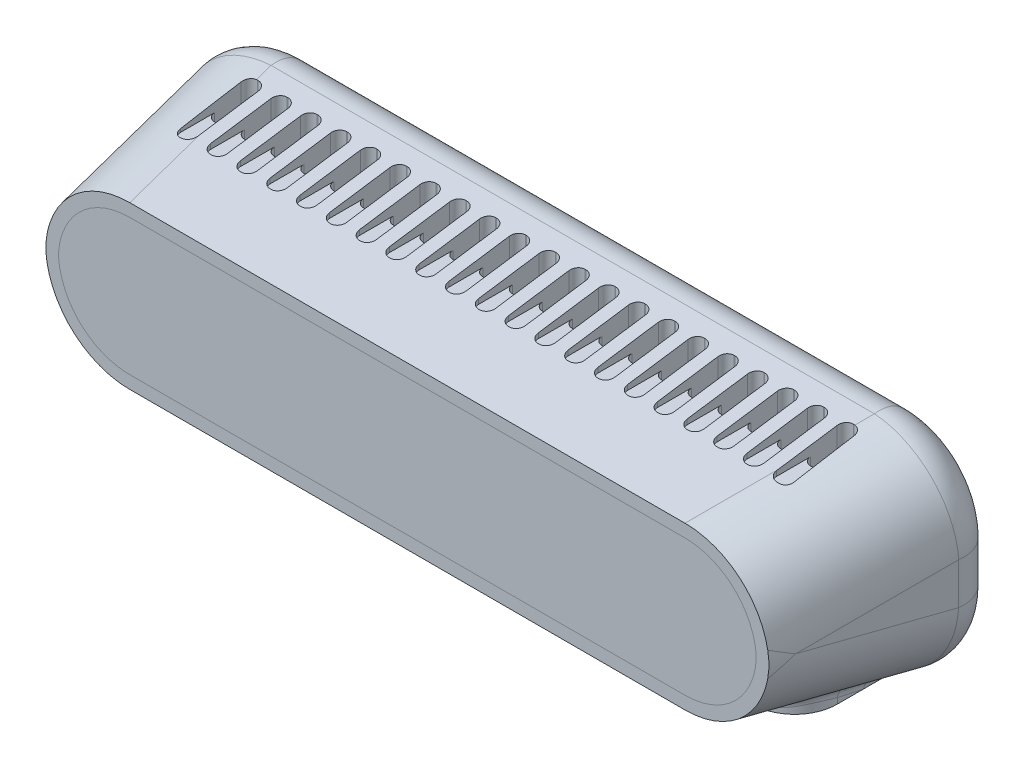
SolidWorks part; units mm, degrees
ref_plane "Front Plane" through (0, 0, 0) normal (0, 0, 1) x (1, 0, 0)
ref_plane "Top Plane" through (0, 0, 0) normal (0, 1, 0) x (1, 0, 0)
ref_plane "Right Plane" through (0, 0, 0) normal (1, 0, 0) x (0, 0, -1)
sketch "Sketch1" plane through (0, 0, 0) normal (0, 0, 1) x (1, 0, 0)
  line L1 (-46, 13) -> (46, 13)
  line L2 (-46, 13) -> (-46, -13)
  line L3 (-46, -13) -> (46, -13)
  line L4 (46, 13) -> (46, -13)
  line L5 (-46, 13) -> (46, -13) construction
  line L6 (-46, -13) -> (46, 13) construction
  point P0 (0, 0)
  dimension "D1" = 92
  dimension "D2" = 26
extrude "Boss-Extrude1" add sketch "Sketch1" along normal blind 24 draft 8.3
fillet "Fillet1" radius 10 4 edges at (44.2494, 11.2494, 12) (44.2494, -11.2494, 12) (-44.2494, -11.2494, 12) (-44.2494, 11.2494, 12)
fillet "Fillet2" radius 8 2 edges at (-42.695, 0, 22.6417) (42.695, 0, 22.6417)
fillet "Fillet3" radius 4 8 edges at (0, -13, 0) (43.1141, -10.1141, 0) (43.1141, 10.1141, 0) (0, 13, 0) (-43.1141, 10.1141, 0) (-43.1141, -10.1141, 0) (-46, 0, 0) (46, 0, 0)
sketch "Sketch2" plane through (0, 0, 0) normal (0, 0, -1) x (-1, 0, 0)
  line L0 (0, 8.3741) -> (0, -8.3741) construction
  line L1 (35.437, 8.3741) -> (-35.437, 8.3741) construction
  line L2 (-35.437, -8.3741) -> (35.437, -8.3741) construction
  line L3 (0, 0) -> (22.5, 0) construction
  circle A0 centre (22.5, 0) radius 1.5
  circle A1 centre (-22.5, 0) radius 1.5
  dimension "D2" = 3
  dimension "D1" = 22.5
extrude "Cut-Extrude1" cut sketch "Sketch2" against normal blind 3
sketch "Sketch3" plane through (0, 0, 0) normal (0, 0, -1) x (-1, 0, 0)
  line L0 (-10.1183, -1.4816) -> (-10.1183, -2.4457)
  line L1 (-17.5759, 1.5105) -> (-17.4031, 1.1558)
  line L2 (-16.3845, 2.3563) -> (-16.3845, 1.9198)
  line L3 (-9.9646, -1.2486) -> (-9.9646, -0.4799)
  line L4 (-17.2485, 1.0791) -> (-17.2485, -0.8588)
  line L5 (-17.2485, -0.8588) -> (-16.8587, -1.2486)
  line L6 (-16.8587, -1.2486) -> (-16.5936, -1.2486)
  line L7 (-16.5936, -1.2486) -> (-16.5936, 1.0791)
  line L8 (-16.5936, 1.0791) -> (-17.2485, 1.0791)
  line L9 (-17.2485, 1.837) -> (-17.2485, 1.1558)
  line L10 (-17.2485, 1.1558) -> (-16.5936, 1.1558)
  line L11 (-16.5936, 1.1558) -> (-16.5936, 1.837)
  line L12 (-16.5936, 1.837) -> (-17.2485, 1.837)
  line L13 (-16.1898, 1.0791) -> (-16.1898, -1.2486)
  line L14 (-16.1898, -1.2486) -> (-15.5293, -1.2486)
  line L15 (-15.5293, -1.2486) -> (-15.5293, 0.527)
  line L16 (-14.988, 0.3646) -> (-14.988, -1.2486)
  line L17 (-14.988, -1.2486) -> (-14.3384, -1.2486)
  line L18 (-14.3384, -1.2486) -> (-14.3384, 0.6647)
  line L19 (-16.1898, 1.0791) -> (-14.8202, 1.0791)
  line L20 (-14.1544, 1.6421) -> (-13.4398, 1.6421)
  line L21 (-13.4398, 1.6421) -> (-13.4398, 1.0791)
  line L22 (-13.4398, 1.0791) -> (-13.0501, 1.0791)
  line L23 (-13.0501, 1.0791) -> (-13.0501, 0.527)
  line L24 (-13.0501, 0.527) -> (-13.4398, 0.527)
  line L25 (-13.4398, 0.527) -> (-13.4398, -0.4799)
  line L26 (-13.0123, -0.6748) -> (-13.0123, -1.2486)
  line L27 (-14.1544, 1.6421) -> (-14.1544, -0.5545)
  line L28 (-13.5414, -1.2486) -> (-13.0123, -1.2486)
  line L29 (-10.8551, 1.9198) -> (-10.8551, -0.8588)
  line L30 (-10.8551, 1.9198) -> (-10.1919, 1.9198)
  line L31 (-10.1919, 1.9198) -> (-10.1919, -1.0996)
  line L32 (-11.0459, -0.285) -> (-12.3833, -0.285)
  line L33 (-12.4402, 0.1018) -> (-11.628, 0.1018)
  line L34 (-11.4451, -0.4799) -> (-11.0459, -0.8588)
  line L35 (-6.684, 1.9198) -> (-6.684, -1.8181)
  line L36 (-6.684, -1.8181) -> (-6.0099, -1.8181)
  line L37 (-6.0099, -1.8181) -> (-6.0099, -0.285)
  line L38 (-6.0099, -0.285) -> (-5.5936, -0.285)
  line L39 (-5.5936, -0.285) -> (-4.5032, -1.8181)
  line L40 (-4.5032, -1.8181) -> (-3.8688, -1.8181)
  line L41 (-6.684, 1.9198) -> (-5.0484, 1.9198)
  line L42 (-6.0099, 1.4256) -> (-6.0099, 0.2022)
  line L43 (-6.0099, 0.2022) -> (-5.2764, 0.2022)
  line L44 (-6.0099, 1.4256) -> (-5.2764, 1.4256)
  line L45 (-3.8688, -1.8181) -> (-5.0484, -0.1596)
  line L46 (-3.5341, 1.9198) -> (-3.5341, -1.8181)
  line L47 (-3.5341, -1.8181) -> (-1.1152, -1.8181)
  line L48 (-1.1152, -1.8181) -> (-1.1152, -1.2486)
  line L49 (-1.1152, -1.2486) -> (-2.9722, -1.2486)
  line L50 (-2.9722, -1.2486) -> (-2.9722, -0.2192)
  line L51 (-2.9722, -0.2192) -> (-1.4485, -0.2192)
  line L52 (-1.4485, -0.2192) -> (-1.4485, 0.3646)
  line L53 (-1.4485, 0.3646) -> (-2.9722, 0.3646)
  line L54 (-2.9722, 0.3646) -> (-2.9722, 1.4256)
  line L55 (-2.9722, 1.4256) -> (-1.1152, 1.4256)
  line L56 (-1.1152, 1.4256) -> (-1.1152, 1.9198)
  line L57 (-1.1152, 1.9198) -> (-3.5341, 1.9198)
  line L58 (-0.9357, -1.8181) -> (0.4408, 1.9198)
  line L59 (0.4408, 1.9198) -> (1.0616, 1.9198)
  line L60 (1.0616, 1.9198) -> (2.3706, -1.8181)
  line L61 (2.3706, -1.8181) -> (1.7161, -1.8181)
  line L62 (1.7161, -1.8181) -> (1.3801, -0.8588)
  line L63 (1.3801, -0.8588) -> (0, -0.8588)
  line L64 (0, -0.8588) -> (-0.3533, -1.8181)
  line L65 (-0.3533, -1.8181) -> (-0.9357, -1.8181)
  line L66 (0.1486, -0.2192) -> (1.2868, -0.2192)
  line L67 (1.2868, -0.2192) -> (0.8322, 1.0791)
  line L68 (0.8322, 1.0791) -> (0.6268, 1.0791)
  line L69 (0.6268, 1.0791) -> (0.1486, -0.2192)
  line L70 (2.745, 1.9198) -> (2.745, -1.8181)
  line L71 (2.745, -1.8181) -> (5.1125, -1.8181)
  line L72 (5.1125, -1.8181) -> (5.1125, -1.2486)
  line L73 (5.1125, -1.2486) -> (3.3279, -1.2486)
  line L74 (3.3279, -1.2486) -> (3.3279, 1.9198)
  line L75 (3.3279, 1.9198) -> (2.745, 1.9198)
  line L76 (7.6257, 1.9198) -> (7.6257, -1.8181)
  line L77 (7.6257, -1.8181) -> (10.1369, -1.8181)
  line L78 (10.1369, -1.8181) -> (10.1369, -1.2486)
  line L79 (10.1369, -1.2486) -> (8.3058, -1.2486)
  line L80 (8.3058, -1.2486) -> (8.3058, -0.1596)
  line L81 (8.3058, -0.1596) -> (9.7707, -0.1596)
  line L82 (9.7707, -0.1596) -> (9.7707, 0.3646)
  line L83 (9.7707, 0.3646) -> (8.3686, 0.3646)
  line L84 (8.3686, 0.3646) -> (8.3686, 1.4256)
  line L85 (8.3686, 1.4256) -> (10.1369, 1.4256)
  line L86 (10.1369, 1.4256) -> (10.1369, 1.9198)
  line L87 (10.1369, 1.9198) -> (7.6257, 1.9198)
  line L88 (10.6378, -1.8181) -> (10.6378, 1.9198)
  line L89 (10.6378, 1.9198) -> (11.3168, 1.9198)
  line L90 (11.3168, 1.9198) -> (12.8874, -0.8588)
  line L91 (12.8874, -0.8588) -> (12.8874, 1.9487)
  line L92 (12.8874, 1.9487) -> (13.4954, 1.9487)
  line L93 (13.4954, 1.9487) -> (13.4954, -1.8181)
  line L94 (13.4954, -1.8181) -> (12.8165, -1.8181)
  line L95 (12.8165, -1.8181) -> (11.1648, 0.8951)
  line L96 (11.1648, 0.8951) -> (11.1648, -1.8181)
  line L97 (11.1648, -1.8181) -> (10.6378, -1.8181)
  line L98 (17.2509, 1.9487) -> (17.2509, -1.8181)
  line L99 (17.2509, -1.8181) -> (19.7059, -1.8181)
  line L100 (19.7059, -1.8181) -> (19.7059, -1.2486)
  line L101 (19.7059, -1.2486) -> (17.801, -1.2486)
  line L102 (17.801, -1.2486) -> (17.801, -0.1596)
  line L103 (17.801, -0.1596) -> (19.3446, -0.1596)
  line L104 (19.3446, -0.1596) -> (19.3446, 0.2827)
  line L105 (19.3446, 0.2827) -> (17.801, 0.2827)
  line L106 (17.801, 0.2827) -> (17.801, 1.3605)
  line L107 (17.801, 1.3605) -> (19.7059, 1.3605)
  line L108 (19.7059, 1.3605) -> (19.7059, 1.9487)
  line L109 (19.7059, 1.9487) -> (17.2509, 1.9487)
  line L110 (5.3833, 3.4501) -> (5.3833, -3.4279)
  line L111 (5.3833, -3.4279) -> (5.6115, -3.4279)
  line L112 (5.6115, -3.4279) -> (5.6115, -1.8889)
  line L113 (5.3833, 3.4501) -> (5.6115, 3.4501)
  line L114 (5.6115, 3.4501) -> (5.6115, 1.9198)
  line L115 (5.6115, -1.8889) -> (6.1303, -1.8889)
  line L116 (5.6115, 0.3646) -> (5.6115, 1.4256)
  line L117 (5.6115, -1.3528) -> (5.6115, -0.1596)
  line L118 (19.8924, 1.7132) -> (19.8924, 1.3605)
  line L119 (19.8924, 1.3605) -> (20.1382, 1.3605)
  line L120 (20.1382, 1.3605) -> (20.1382, 1.6955)
  line L121 (20.1382, 1.6955) -> (20.2268, 1.6955)
  line L122 (20.2268, 1.6955) -> (20.2268, 1.9198)
  line L123 (20.2268, 1.9198) -> (19.7928, 1.9198)
  line L124 (19.7928, 1.9198) -> (19.7928, 1.7132)
  line L125 (19.7928, 1.7132) -> (19.8924, 1.7132)
  line L126 (6.5868, -2.7726) -> (6.5868, -3.4279)
  line L127 (6.5868, -3.4279) -> (6.82, -3.4279)
  line L128 (6.82, -3.4279) -> (6.82, -2.7726)
  line L129 (6.82, -2.7726) -> (7.0318, -2.7726)
  line L130 (7.0318, -2.7726) -> (7.0318, -2.5395)
  line L131 (7.0318, -2.5395) -> (6.2599, -2.5395)
  line L132 (6.2599, -2.5395) -> (6.2599, -2.7726)
  line L133 (6.2599, -2.7726) -> (6.5868, -2.7726)
  line L134 (7.7817, -2.5395) -> (7.7817, -3.4279)
  line L135 (7.7817, -3.4279) -> (8.3396, -3.4279)
  line L136 (8.3396, -3.4279) -> (8.3396, -3.2148)
  line L137 (8.3396, -3.2148) -> (8.0116, -3.2148)
  line L138 (8.0116, -3.2148) -> (8.0116, -3.1047)
  line L139 (8.0116, -3.1047) -> (8.3396, -3.1047)
  line L140 (8.3396, -3.1047) -> (8.3396, -2.8844)
  line L141 (8.3396, -2.8844) -> (8.0116, -2.8844)
  line L142 (8.0116, -2.8844) -> (8.0116, -2.7726)
  line L143 (8.0116, -2.7726) -> (8.3396, -2.7726)
  line L144 (8.3396, -2.7726) -> (8.3396, -2.5395)
  line L145 (8.3396, -2.5395) -> (7.7817, -2.5395)
  line L146 (18.7867, -2.5395) -> (18.7867, -2.6548)
  line L147 (18.7867, -2.6548) -> (19.1217, -3.1047)
  line L148 (19.1217, -3.1047) -> (19.1217, -3.4279)
  line L149 (19.1217, -3.4279) -> (19.3446, -3.4279)
  line L150 (19.3446, -3.4279) -> (19.3446, -3.1047)
  line L151 (19.3446, -3.1047) -> (19.6719, -2.6548)
  line L152 (19.6719, -2.6548) -> (19.6719, -2.5395)
  line L153 (19.6719, -2.5395) -> (19.4192, -2.5395)
  line L154 (19.4192, -2.5395) -> (19.2331, -2.9188)
  line L155 (19.2331, -2.9188) -> (19.0406, -2.5395)
  line L156 (19.0406, -2.5395) -> (18.7867, -2.5395)
  line L157 (10.3915, -2.5395) -> (10.3915, -3.4279)
  line L158 (10.3915, -3.4279) -> (10.6378, -3.4279)
  line L159 (10.6378, -3.4279) -> (10.6378, -3.1047)
  line L160 (10.6378, -3.1047) -> (10.9466, -3.1047)
  line L161 (10.9466, -3.1047) -> (10.9466, -3.4279)
  line L162 (10.9466, -3.4279) -> (11.1922, -3.4279)
  line L163 (11.1922, -3.4279) -> (11.1922, -2.5395)
  line L164 (11.1922, -2.5395) -> (10.9466, -2.5395)
  line L165 (10.9466, -2.5395) -> (10.9466, -2.864)
  line L166 (10.9466, -2.864) -> (10.6378, -2.864)
  line L167 (10.6378, -2.864) -> (10.6378, -2.5395)
  line L168 (10.6378, -2.5395) -> (10.3915, -2.5395)
  line L169 (14.7701, -2.5395) -> (14.7701, -3.4279)
  line L170 (14.7701, -3.4279) -> (15.4441, -3.4279)
  line L171 (15.4441, -3.4279) -> (15.4441, -3.1863)
  line L172 (15.4441, -3.1863) -> (14.9912, -3.1863)
  line L173 (14.9912, -3.1863) -> (14.9912, -2.5395)
  line L174 (14.9912, -2.5395) -> (14.7701, -2.5395)
  line L175 (11.9246, -2.5395) -> (11.9246, -3.4279)
  line L176 (11.9246, -3.4279) -> (12.1533, -3.4279)
  line L177 (12.1533, -3.4279) -> (12.1533, -3.0277)
  line L178 (12.1533, -3.0277) -> (12.4059, -3.4279)
  line L179 (12.4059, -3.4279) -> (12.5936, -3.4279)
  line L180 (12.5936, -3.4279) -> (12.5936, -2.5395)
  line L181 (12.5936, -2.5395) -> (12.3752, -2.5395)
  line L182 (12.3752, -2.5395) -> (12.3752, -3.0277)
  line L183 (12.3752, -3.0277) -> (12.067, -2.5395)
  line L184 (12.067, -2.5395) -> (11.9246, -2.5395)
  line L185 (18.2928, -3.4279) -> (18.2928, -2.9596)
  line L186 (18.2928, -2.9596) -> (17.8314, -2.9596)
  line L187 (17.8314, -2.9596) -> (17.8314, -3.1047)
  line L188 (17.8314, -3.1047) -> (18.0621, -3.1047)
  line L189 (18.0621, -3.1047) -> (18.0621, -3.1937)
  line L190 (18.2586, -2.5395) -> (18.2586, -2.7399)
  circle A0 centre (13.7144, -3.0076) radius 0.2529
  circle A1 centre (13.7144, -3.0076) radius 0.505
  circle A2 centre (16.4194, -3.0076) radius 0.221
  circle A3 centre (16.4194, -3.0076) radius 0.5073
  spline S0 degree 3 poles (-17.4031, 1.1558) (-17.705, 0.7597) (-18.2263, 0.0675) (-18.1093, -1.0485) (-17.7889, -1.7555) (-17.2198, -2.2326) (-16.5715, -2.4699) (-15.7544, -2.6488) (-14.7648, -2.654) (-13.747, -2.6667) (-12.6926, -2.5299) (-11.8511, -2.209) (-10.9113, -2.0008) (-10.4305, -1.6408) (-10.1183, -1.4816) knots 0 0 0 0 0.138485 0.208302 0.290517 0.339358 0.402526 0.472891 0.562067 0.665741 0.745111 0.844013 0.905759 1 1 1 1
  spline S1 degree 3 poles (-10.1183, -2.4457) (-10.6271, -2.6238) (-11.5809, -3.0813) (-13.2876, -3.4241) (-14.8949, -3.4779) (-16.3448, -3.323) (-17.3928, -2.9391) (-18.1445, -2.3067) (-18.6022, -1.6621) (-18.6229, -0.9929) (-18.6695, -0.3917) (-18.4494, 0.2479) (-18.1746, 0.9357) (-17.8759, 1.3781) (-17.5759, 1.5105) knots 0 0 0 0 0.127529 0.248586 0.408538 0.506165 0.592421 0.666838 0.738043 0.768286 0.82348 0.879309 0.925241 1 1 1 1
  spline S2 degree 3 poles (-16.3845, 2.3563) (-15.7743, 2.6553) (-14.7883, 3.1087) (-13.3418, 3.5012) (-12.1691, 3.5105) (-11.1167, 3.5401) (-10.2761, 3.4041) (-9.5837, 3.1311) (-9.0534, 2.6582) (-8.5228, 2.1268) (-8.2947, 1.356) (-8.2657, 0.5983) (-8.5301, -0.1233) (-9.0201, -0.8302) (-9.6051, -1.1247) (-9.9646, -1.2486) knots 0 0 0 0 0.161353 0.257604 0.352885 0.438704 0.507372 0.553855 0.613022 0.675033 0.72843 0.799577 0.851354 0.908448 1 1 1 1
  spline S3 degree 3 poles (-16.3845, 1.9198) (-16.0252, 2.2108) (-15.3114, 2.4287) (-14.3932, 2.7463) (-13.6196, 2.9286) (-12.7142, 3.0474) (-11.7934, 3.0579) (-10.8686, 2.9917) (-10.0949, 2.861) (-9.5328, 2.4069) (-9.1912, 2.0049) (-9.0035, 1.4779) (-8.8732, 0.8545) (-9.2768, 0.0866) (-9.6467, -0.343) (-9.9646, -0.4799) knots 0 0 0 0 0.128203 0.209271 0.275421 0.352695 0.467502 0.53476 0.616646 0.683094 0.735056 0.76318 0.841365 0.904956 1 1 1 1
  spline S4 degree 2 poles (-15.5293, 0.527) (-15.1738, 0.6562) (-14.988, 0.3646) knots 0 0 0 1 1 1
  spline S5 degree 2 poles (-14.3384, 0.6647) (-14.4854, 0.9769) (-14.8202, 1.0791) knots 0 0 0 1 1 1
  spline S6 degree 3 poles (-13.4398, -0.4799) (-13.4539, -0.5331) (-13.4118, -0.6806) (-13.1962, -0.6726) (-13.0809, -0.6757) (-13.0123, -0.6748) knots 0 0 0 0 0.311066 0.648993 1 1 1 1
  spline S7 degree 3 poles (-14.1544, -0.5545) (-14.1399, -0.6528) (-14.063, -0.7976) (-13.8983, -1.0783) (-13.6803, -1.1825) (-13.5414, -1.2486) knots 0 0 0 0 0.302893 0.509364 1 1 1 1
  spline S8 degree 3 poles (-10.8551, -0.8588) (-10.7886, -0.9505) (-10.6188, -1.1554) (-10.3148, -1.2163) (-10.1919, -1.0996) knots 0 0 0 0 0.428389 1 1 1 1
  spline S9 degree 3 poles (-11.0459, -0.285) (-11.0387, 0.0236) (-10.9978, 0.5571) (-11.4811, 1.0491) (-11.9177, 1.0726) (-12.3537, 1.1313) (-12.6917, 0.8456) (-12.9525, 0.5497) (-13.1145, 0.0672) (-13.0102, -0.483) (-12.7562, -0.9844) (-12.3487, -1.2166) (-11.7401, -1.2884) (-11.2404, -1.1603) (-11.0459, -0.8588) knots 0 0 0 0 0.147895 0.223218 0.286322 0.345118 0.41702 0.474432 0.527074 0.643944 0.721948 0.776562 0.851474 1 1 1 1
  spline S10 degree 3 poles (-12.3833, -0.285) (-12.4317, -0.4018) (-12.3576, -0.6054) (-12.11, -0.69) (-11.8069, -0.6858) (-11.5872, -0.56) (-11.4451, -0.4799) knots 0 0 0 0 0.287682 0.420631 0.604096 1 1 1 1
  spline S11 degree 3 poles (-5.006, -0.2192) (-4.6226, -0.0698) (-4.0877, 0.4208) (-4.1126, 1.5055) (-4.6865, 1.897) (-5.0484, 1.9198) knots 0 0 0 0 0.419385 0.634922 1 1 1 1
  spline S12 degree 3 poles (-5.2764, 1.4256) (-4.9678, 1.457) (-4.8097, 1.137) (-4.6757, 0.5174) (-5.1295, 0.3367) (-5.2764, 0.2022) knots 0 0 0 0 0.401789 0.598649 1 1 1 1
  spline S13 degree 3 poles (6.1303, -1.8889) (6.3906, -1.8568) (6.7408, -1.6625) (7.1143, -1.2921) (7.1991, -0.8599) (7.1593, -0.4127) (6.9365, 0.0205) (6.3837, 0.306) (5.937, 0.3936) (5.6115, 0.3646) knots 0 0 0 0 0.198966 0.307193 0.392475 0.529911 0.652662 0.748632 1 1 1 1
  spline S14 degree 3 poles (5.6115, 1.4256) (5.8132, 1.4753) (6.1108, 1.4638) (6.4775, 1.3623) (6.6692, 1.179) (6.8776, 1.2481) (7.0518, 1.3771) (6.9954, 1.7615) (6.3874, 1.9829) (5.9292, 1.953) (5.6115, 1.9198) knots 0 0 0 0 0.193604 0.272144 0.356962 0.413856 0.461361 0.549484 0.706887 1 1 1 1
  spline S15 degree 3 poles (5.6115, -0.1596) (5.7979, -0.1672) (6.1249, -0.1196) (6.427, -0.3926) (6.55, -0.6986) (6.4623, -1.0323) (6.1537, -1.3523) (5.8201, -1.4085) (5.6115, -1.3528) knots 0 0 0 0 0.23994 0.35165 0.471581 0.625952 0.740504 1 1 1 1
  spline S16 degree 3 poles (16.5963, 1.2891) (16.5752, 1.8059) (15.6822, 2.0291) (14.7523, 2.2371) (14.1375, 1.5964) (14.0648, 1.1108) (14.0791, 0.7026) (14.1605, 0.2161) (14.6213, -0.0053) (15.0541, -0.1514) (15.4533, -0.2719) (15.7607, -0.3852) (16.1146, -0.5731) (16.0686, -1.1129) (15.6695, -1.272) (15.2849, -1.2545) (14.8153, -1.1196) (14.3196, -0.6868) (13.9528, -1.0674) (14.0106, -1.4338) (14.3397, -1.7184) (14.8623, -1.8386) (15.4893, -1.893) (16.3448, -1.9661) (16.8173, -1.0838) (16.6961, 0.0026) (15.6478, 0.2567) (14.9829, 0.5023) (14.5728, 0.933) (14.8237, 1.5178) (15.3776, 1.3813) (15.8023, 1.2606) (16.1777, 1.0854) (16.5963, 1.2891) (16.5752, 1.8059) (15.6822, 2.0291) knots -0.06331 -0.038231 -0.015789 0 0.035442 0.11671 0.149718 0.170032 0.19758 0.219879 0.247238 0.275752 0.298886 0.316615 0.331759 0.362401 0.380919 0.398822 0.426284 0.46585 0.484183 0.498446 0.523788 0.55186 0.587208 0.632836 0.680508 0.733979 0.791278 0.840285 0.856404 0.884476 0.917534 0.93669 0.961769 0.984211 1 1.035442 1.11671 1.149718 only from (16.5494, 1.6421) to (16.5494, 1.6421)
  spline S17 degree 3 poles (9.772, -2.5176) (9.7722, -2.7919) (9.4955, -2.7602) (9.2813, -2.9313) (9.3184, -3.2216) (9.5447, -3.3219) (9.7721, -3.275) (9.7856, -3.4412) (9.5937, -3.4795) (9.3991, -3.4944) (9.1482, -3.3022) (9.1123, -2.9973) (9.2377, -2.7636) (9.4034, -2.5789) (9.772, -2.5176) (9.7722, -2.7919) (9.4955, -2.7602) knots -0.186029 -0.143916 -0.010132 0 0.105146 0.161221 0.257709 0.318732 0.395239 0.41878 0.442594 0.559784 0.607066 0.734835 0.813971 0.856084 0.989868 1 1.105146 1.161221 1.257709 only from (9.7707, -2.6861) to (9.7707, -2.6861)
  spline S18 degree 3 poles (18.2586, -2.5395) (18.0917, -2.3869) (17.6604, -2.4095) (17.4422, -2.7882) (17.3951, -3.0934) (17.5514, -3.3644) (17.8772, -3.4688) (18.1187, -3.4664) (18.2928, -3.4279) knots 0 0 0 0 0.299658 0.393008 0.564536 0.682614 0.767684 1 1 1 1
  spline S19 degree 3 poles (18.0621, -3.1937) (17.9707, -3.2492) (17.6091, -3.2582) (17.637, -2.6414) (18.105, -2.6597) (18.2586, -2.7399) knots 0 0 0 0 0.290878 0.539826 1 1 1 1
  spline S20 degree 3 poles (-12.4402, 0.1018) (-12.4436, 0.5888) (-11.6115, 0.6241) (-11.628, 0.1018) knots 0 0 0 0 1 1 1 1
  point P168 (-18.1306, -2.2623)
  point P388 (-12.2844, -0.6126)
  point P391 (0.1401, -0.2192)
  point P393 (-14.3384, 2.7139)
  point P395 (-14.3384, 2.7482)
  point P397 (-10.0749, 2.7766)
  point P398 (15.4441, -1.8889)
  point P399 (15.3459, -1.2478)
  point P400 (15.7709, 1.261)
  point P401 (5.9976, 1.9485)
  point P402 (6.5467, 1.9009)
  point P403 (5.8562, 1.459)
  point P405 (6.4652, 1.3434)
  point P407 (6.1968, -0.2192)
  point P408 (6.4216, -1.0441)
  point P409 (6.7052, 1.2165)
  point P410 (6.8819, 1.261)
extrude "Boss-Extrude2" add sketch "Sketch3" along normal blind 0.1
ref_plane "Plane2" through (0, 12.3741, 0) normal (0, 1, 0) x (1, 0, 0)
sketch "Sketch5" plane through (0, 12.3741, 0) normal (0, 1, 0) x (1, 0, 0)
  line L0 (0, -4.5774) -> (0, -6.5774) construction
  line L1 (35.437, -4.5774) -> (-35.437, -4.5774) construction
  line L2 (0, -6.5774) -> (0, -11.0774) construction
  line L3 (4.5, -7.5274) -> (4.5, -14.6274)
  line L4 (-0.05, -6.5774) -> (0.05, -6.5774)
  line L5 (-1, -7.5274) -> (-1, -14.6274)
  line L6 (-0.05, -15.5774) -> (0.05, -15.5774)
  line L7 (1, -7.5274) -> (1, -14.6274)
  line L8 (-1, -6.5774) -> (1, -15.5774) construction
  line L9 (-1, -15.5774) -> (1, -6.5774) construction
  line L10 (2.5, -7.5274) -> (2.5, -14.6274)
  line L11 (3.45, -6.5774) -> (3.55, -6.5774)
  line L12 (3.45, -15.5774) -> (3.55, -15.5774)
  line L13 (8, -7.5274) -> (8, -14.6274)
  line L14 (6, -7.5274) -> (6, -14.6274)
  line L15 (6.95, -6.5774) -> (7.05, -6.5774)
  line L16 (6.95, -15.5774) -> (7.05, -15.5774)
  line L17 (11.5, -7.5274) -> (11.5, -14.6274)
  line L18 (9.5, -7.5274) -> (9.5, -14.6274)
  line L19 (10.45, -6.5774) -> (10.55, -6.5774)
  line L20 (10.45, -15.5774) -> (10.55, -15.5774)
  line L21 (15, -7.5274) -> (15, -14.6274)
  line L22 (13, -7.5274) -> (13, -14.6274)
  line L23 (13.95, -6.5774) -> (14.05, -6.5774)
  line L24 (13.95, -15.5774) -> (14.05, -15.5774)
  line L25 (18.5, -7.5274) -> (18.5, -14.6274)
  line L26 (16.5, -7.5274) -> (16.5, -14.6274)
  line L27 (17.45, -6.5774) -> (17.55, -6.5774)
  line L28 (17.45, -15.5774) -> (17.55, -15.5774)
  line L29 (22, -7.5274) -> (22, -14.6274)
  line L30 (20, -7.5274) -> (20, -14.6274)
  line L31 (20.95, -6.5774) -> (21.05, -6.5774)
  line L32 (20.95, -15.5774) -> (21.05, -15.5774)
  line L33 (25.5, -7.5274) -> (25.5, -14.6274)
  line L34 (23.5, -7.5274) -> (23.5, -14.6274)
  line L35 (24.45, -6.5774) -> (24.55, -6.5774)
  line L36 (24.45, -15.5774) -> (24.55, -15.5774)
  line L37 (29, -7.5274) -> (29, -14.6274)
  line L38 (27, -7.5274) -> (27, -14.6274)
  line L39 (27.95, -6.5774) -> (28.05, -6.5774)
  line L40 (27.95, -15.5774) -> (28.05, -15.5774)
  line L41 (32.5, -7.5274) -> (32.5, -14.6274)
  line L42 (30.5, -7.5274) -> (30.5, -14.6274)
  line L43 (31.45, -6.5774) -> (31.55, -6.5774)
  line L44 (31.45, -15.5774) -> (31.55, -15.5774)
  line L45 (36, -7.5274) -> (36, -14.6274)
  line L46 (34, -7.5274) -> (34, -14.6274)
  line L47 (34.95, -6.5774) -> (35.05, -6.5774)
  line L48 (34.95, -15.5774) -> (35.05, -15.5774)
  line L49 (0, -4.5774) -> (0, -24) construction
  line L50 (32.6035, -24) -> (-32.6035, -24) construction
  line L51 (-34.95, -15.5774) -> (-35.05, -15.5774)
  line L52 (-34.95, -6.5774) -> (-35.05, -6.5774)
  line L53 (-34, -7.5274) -> (-34, -14.6274)
  line L54 (-36, -7.5274) -> (-36, -14.6274)
  line L55 (-31.45, -15.5774) -> (-31.55, -15.5774)
  line L56 (-31.45, -6.5774) -> (-31.55, -6.5774)
  line L57 (-30.5, -7.5274) -> (-30.5, -14.6274)
  line L58 (-32.5, -7.5274) -> (-32.5, -14.6274)
  line L59 (-27.95, -15.5774) -> (-28.05, -15.5774)
  line L60 (-27.95, -6.5774) -> (-28.05, -6.5774)
  line L61 (-27, -7.5274) -> (-27, -14.6274)
  line L62 (-29, -7.5274) -> (-29, -14.6274)
  line L63 (-24.45, -15.5774) -> (-24.55, -15.5774)
  line L64 (-24.45, -6.5774) -> (-24.55, -6.5774)
  line L65 (-23.5, -7.5274) -> (-23.5, -14.6274)
  line L66 (-25.5, -7.5274) -> (-25.5, -14.6274)
  line L67 (-20.95, -15.5774) -> (-21.05, -15.5774)
  line L68 (-20.95, -6.5774) -> (-21.05, -6.5774)
  line L69 (-20, -7.5274) -> (-20, -14.6274)
  line L70 (-22, -7.5274) -> (-22, -14.6274)
  line L71 (-17.45, -15.5774) -> (-17.55, -15.5774)
  line L72 (-17.45, -6.5774) -> (-17.55, -6.5774)
  line L73 (-16.5, -7.5274) -> (-16.5, -14.6274)
  line L74 (-18.5, -7.5274) -> (-18.5, -14.6274)
  line L75 (-13.95, -15.5774) -> (-14.05, -15.5774)
  line L76 (-13.95, -6.5774) -> (-14.05, -6.5774)
  line L77 (-13, -7.5274) -> (-13, -14.6274)
  line L78 (-15, -7.5274) -> (-15, -14.6274)
  line L79 (-10.45, -15.5774) -> (-10.55, -15.5774)
  line L80 (-10.45, -6.5774) -> (-10.55, -6.5774)
  line L81 (-9.5, -7.5274) -> (-9.5, -14.6274)
  line L82 (-11.5, -7.5274) -> (-11.5, -14.6274)
  line L83 (-6.95, -15.5774) -> (-7.05, -15.5774)
  line L84 (-6.95, -6.5774) -> (-7.05, -6.5774)
  line L85 (-6, -7.5274) -> (-6, -14.6274)
  line L86 (-8, -7.5274) -> (-8, -14.6274)
  line L87 (-3.45, -15.5774) -> (-3.55, -15.5774)
  line L88 (-3.45, -6.5774) -> (-3.55, -6.5774)
  line L89 (-4.5, -7.5274) -> (-4.5, -14.6274)
  line L90 (-2.5, -7.5274) -> (-2.5, -14.6274)
  arc A0 (1, -14.6274) -> (0.05, -15.5774) centre (0.05, -14.6274) cw
  arc A1 (-0.05, -15.5774) -> (-1, -14.6274) centre (-0.05, -14.6274) cw
  arc A2 (0.05, -6.5774) -> (1, -7.5274) centre (0.05, -7.5274) cw
  arc A3 (-1, -7.5274) -> (-0.05, -6.5774) centre (-0.05, -7.5274) cw
  arc A4 (3.55, -6.5774) -> (4.5, -7.5274) centre (3.55, -7.5274) cw
  arc A5 (2.5, -7.5274) -> (3.45, -6.5774) centre (3.45, -7.5274) cw
  arc A6 (3.45, -15.5774) -> (2.5, -14.6274) centre (3.45, -14.6274) cw
  arc A7 (4.5, -14.6274) -> (3.55, -15.5774) centre (3.55, -14.6274) cw
  arc A8 (7.05, -6.5774) -> (8, -7.5274) centre (7.05, -7.5274) cw
  arc A9 (6, -7.5274) -> (6.95, -6.5774) centre (6.95, -7.5274) cw
  arc A10 (6.95, -15.5774) -> (6, -14.6274) centre (6.95, -14.6274) cw
  arc A11 (8, -14.6274) -> (7.05, -15.5774) centre (7.05, -14.6274) cw
  arc A12 (10.55, -6.5774) -> (11.5, -7.5274) centre (10.55, -7.5274) cw
  arc A13 (9.5, -7.5274) -> (10.45, -6.5774) centre (10.45, -7.5274) cw
  arc A14 (10.45, -15.5774) -> (9.5, -14.6274) centre (10.45, -14.6274) cw
  arc A15 (11.5, -14.6274) -> (10.55, -15.5774) centre (10.55, -14.6274) cw
  arc A16 (14.05, -6.5774) -> (15, -7.5274) centre (14.05, -7.5274) cw
  arc A17 (13, -7.5274) -> (13.95, -6.5774) centre (13.95, -7.5274) cw
  arc A18 (13.95, -15.5774) -> (13, -14.6274) centre (13.95, -14.6274) cw
  arc A19 (15, -14.6274) -> (14.05, -15.5774) centre (14.05, -14.6274) cw
  arc A20 (17.55, -6.5774) -> (18.5, -7.5274) centre (17.55, -7.5274) cw
  arc A21 (16.5, -7.5274) -> (17.45, -6.5774) centre (17.45, -7.5274) cw
  arc A22 (17.45, -15.5774) -> (16.5, -14.6274) centre (17.45, -14.6274) cw
  arc A23 (18.5, -14.6274) -> (17.55, -15.5774) centre (17.55, -14.6274) cw
  arc A24 (21.05, -6.5774) -> (22, -7.5274) centre (21.05, -7.5274) cw
  arc A25 (20, -7.5274) -> (20.95, -6.5774) centre (20.95, -7.5274) cw
  arc A26 (20.95, -15.5774) -> (20, -14.6274) centre (20.95, -14.6274) cw
  arc A27 (22, -14.6274) -> (21.05, -15.5774) centre (21.05, -14.6274) cw
  arc A28 (24.55, -6.5774) -> (25.5, -7.5274) centre (24.55, -7.5274) cw
  arc A29 (23.5, -7.5274) -> (24.45, -6.5774) centre (24.45, -7.5274) cw
  arc A30 (24.45, -15.5774) -> (23.5, -14.6274) centre (24.45, -14.6274) cw
  arc A31 (25.5, -14.6274) -> (24.55, -15.5774) centre (24.55, -14.6274) cw
  arc A32 (28.05, -6.5774) -> (29, -7.5274) centre (28.05, -7.5274) cw
  arc A33 (27, -7.5274) -> (27.95, -6.5774) centre (27.95, -7.5274) cw
  arc A34 (27.95, -15.5774) -> (27, -14.6274) centre (27.95, -14.6274) cw
  arc A35 (29, -14.6274) -> (28.05, -15.5774) centre (28.05, -14.6274) cw
  arc A36 (31.55, -6.5774) -> (32.5, -7.5274) centre (31.55, -7.5274) cw
  arc A37 (30.5, -7.5274) -> (31.45, -6.5774) centre (31.45, -7.5274) cw
  arc A38 (31.45, -15.5774) -> (30.5, -14.6274) centre (31.45, -14.6274) cw
  arc A39 (32.5, -14.6274) -> (31.55, -15.5774) centre (31.55, -14.6274) cw
  arc A40 (35.05, -6.5774) -> (36, -7.5274) centre (35.05, -7.5274) cw
  arc A41 (34, -7.5274) -> (34.95, -6.5774) centre (34.95, -7.5274) cw
  arc A42 (34.95, -15.5774) -> (34, -14.6274) centre (34.95, -14.6274) cw
  arc A43 (36, -14.6274) -> (35.05, -15.5774) centre (35.05, -14.6274) cw
  arc A44 (-36, -14.6274) -> (-35.05, -15.5774) centre (-35.05, -14.6274) ccw
  arc A45 (-34.95, -15.5774) -> (-34, -14.6274) centre (-34.95, -14.6274) ccw
  arc A46 (-34, -7.5274) -> (-34.95, -6.5774) centre (-34.95, -7.5274) ccw
  arc A47 (-35.05, -6.5774) -> (-36, -7.5274) centre (-35.05, -7.5274) ccw
  arc A48 (-32.5, -14.6274) -> (-31.55, -15.5774) centre (-31.55, -14.6274) ccw
  arc A49 (-31.45, -15.5774) -> (-30.5, -14.6274) centre (-31.45, -14.6274) ccw
  arc A50 (-30.5, -7.5274) -> (-31.45, -6.5774) centre (-31.45, -7.5274) ccw
  arc A51 (-31.55, -6.5774) -> (-32.5, -7.5274) centre (-31.55, -7.5274) ccw
  arc A52 (-29, -14.6274) -> (-28.05, -15.5774) centre (-28.05, -14.6274) ccw
  arc A53 (-27.95, -15.5774) -> (-27, -14.6274) centre (-27.95, -14.6274) ccw
  arc A54 (-27, -7.5274) -> (-27.95, -6.5774) centre (-27.95, -7.5274) ccw
  arc A55 (-28.05, -6.5774) -> (-29, -7.5274) centre (-28.05, -7.5274) ccw
  arc A56 (-25.5, -14.6274) -> (-24.55, -15.5774) centre (-24.55, -14.6274) ccw
  arc A57 (-24.45, -15.5774) -> (-23.5, -14.6274) centre (-24.45, -14.6274) ccw
  arc A58 (-23.5, -7.5274) -> (-24.45, -6.5774) centre (-24.45, -7.5274) ccw
  arc A59 (-24.55, -6.5774) -> (-25.5, -7.5274) centre (-24.55, -7.5274) ccw
  arc A60 (-22, -14.6274) -> (-21.05, -15.5774) centre (-21.05, -14.6274) ccw
  arc A61 (-20.95, -15.5774) -> (-20, -14.6274) centre (-20.95, -14.6274) ccw
  arc A62 (-20, -7.5274) -> (-20.95, -6.5774) centre (-20.95, -7.5274) ccw
  arc A63 (-21.05, -6.5774) -> (-22, -7.5274) centre (-21.05, -7.5274) ccw
  arc A64 (-18.5, -14.6274) -> (-17.55, -15.5774) centre (-17.55, -14.6274) ccw
  arc A65 (-17.45, -15.5774) -> (-16.5, -14.6274) centre (-17.45, -14.6274) ccw
  arc A66 (-16.5, -7.5274) -> (-17.45, -6.5774) centre (-17.45, -7.5274) ccw
  arc A67 (-17.55, -6.5774) -> (-18.5, -7.5274) centre (-17.55, -7.5274) ccw
  arc A68 (-15, -14.6274) -> (-14.05, -15.5774) centre (-14.05, -14.6274) ccw
  arc A69 (-13.95, -15.5774) -> (-13, -14.6274) centre (-13.95, -14.6274) ccw
  arc A70 (-13, -7.5274) -> (-13.95, -6.5774) centre (-13.95, -7.5274) ccw
  arc A71 (-14.05, -6.5774) -> (-15, -7.5274) centre (-14.05, -7.5274) ccw
  arc A72 (-11.5, -14.6274) -> (-10.55, -15.5774) centre (-10.55, -14.6274) ccw
  arc A73 (-10.45, -15.5774) -> (-9.5, -14.6274) centre (-10.45, -14.6274) ccw
  arc A74 (-9.5, -7.5274) -> (-10.45, -6.5774) centre (-10.45, -7.5274) ccw
  arc A75 (-10.55, -6.5774) -> (-11.5, -7.5274) centre (-10.55, -7.5274) ccw
  arc A76 (-8, -14.6274) -> (-7.05, -15.5774) centre (-7.05, -14.6274) ccw
  arc A77 (-6.95, -15.5774) -> (-6, -14.6274) centre (-6.95, -14.6274) ccw
  arc A78 (-6, -7.5274) -> (-6.95, -6.5774) centre (-6.95, -7.5274) ccw
  arc A79 (-7.05, -6.5774) -> (-8, -7.5274) centre (-7.05, -7.5274) ccw
  arc A80 (-4.5, -14.6274) -> (-3.55, -15.5774) centre (-3.55, -14.6274) ccw
  arc A81 (-3.45, -15.5774) -> (-2.5, -14.6274) centre (-3.45, -14.6274) ccw
  arc A82 (-2.5, -7.5274) -> (-3.45, -6.5774) centre (-3.45, -7.5274) ccw
  arc A83 (-3.55, -6.5774) -> (-4.5, -7.5274) centre (-3.55, -7.5274) ccw
  dimension "D5" = 0.95
  dimension "D1" = 2
  dimension "D2" = 4.5
  dimension "D3" = 9
  dimension "D4" = 2
  dimension "D6" = 11
extrude "Cut-Extrude2" cut sketch "Sketch5" against normal blind 2.1
sketch "Sketch6" plane through (0, 12.3741, 0) normal (0, 1, 0) x (1, 0, 0)
  line L0 (0, -6.5774) -> (0, -9.0774) construction
  line L2 (0.05, -6.5774) -> (-0.05, -6.5774) construction
  line L6 (-0.05, -11.5774) -> (0.05, -11.5774)
  line L7 (1, -14.6274) -> (1, -7.5274)
  line L8 (0.05, -6.5774) -> (-0.05, -6.5774)
  line L9 (-1, -7.5274) -> (-1, -14.6274)
  line L10 (-0.05, -15.5774) -> (0.05, -15.5774)
  line L11 (1, -10.6274) -> (1, -7.5274)
  line L12 (0.05, -6.5774) -> (-0.05, -6.5774)
  line L16 (3.45, -11.5774) -> (3.55, -11.5774)
  line L17 (2.5, -7.5274) -> (2.5, -10.6274)
  line L18 (-1, -7.5274) -> (-1, -10.6274)
  line L19 (3.55, -6.5774) -> (3.45, -6.5774)
  line L20 (4.5, -10.6274) -> (4.5, -7.5274)
  line L21 (6.95, -11.5774) -> (7.05, -11.5774)
  line L22 (6, -7.5274) -> (6, -10.6274)
  line L23 (7.05, -6.5774) -> (6.95, -6.5774)
  line L24 (8, -10.6274) -> (8, -7.5274)
  line L25 (10.45, -11.5774) -> (10.55, -11.5774)
  line L26 (9.5, -7.5274) -> (9.5, -10.6274)
  line L27 (10.55, -6.5774) -> (10.45, -6.5774)
  line L28 (11.5, -10.6274) -> (11.5, -7.5274)
  line L29 (13.95, -11.5774) -> (14.05, -11.5774)
  line L30 (13, -7.5274) -> (13, -10.6274)
  line L31 (14.05, -6.5774) -> (13.95, -6.5774)
  line L32 (15, -10.6274) -> (15, -7.5274)
  line L33 (17.45, -11.5774) -> (17.55, -11.5774)
  line L34 (16.5, -7.5274) -> (16.5, -10.6274)
  line L35 (17.55, -6.5774) -> (17.45, -6.5774)
  line L36 (18.5, -10.6274) -> (18.5, -7.5274)
  line L37 (20.95, -11.5774) -> (21.05, -11.5774)
  line L38 (20, -7.5274) -> (20, -10.6274)
  line L39 (21.05, -6.5774) -> (20.95, -6.5774)
  line L40 (22, -10.6274) -> (22, -7.5274)
  line L41 (24.45, -11.5774) -> (24.55, -11.5774)
  line L42 (23.5, -7.5274) -> (23.5, -10.6274)
  line L43 (24.55, -6.5774) -> (24.45, -6.5774)
  line L44 (25.5, -10.6274) -> (25.5, -7.5274)
  line L45 (27.95, -11.5774) -> (28.05, -11.5774)
  line L46 (27, -7.5274) -> (27, -10.6274)
  line L47 (28.05, -6.5774) -> (27.95, -6.5774)
  line L48 (29, -10.6274) -> (29, -7.5274)
  line L49 (31.45, -11.5774) -> (31.55, -11.5774)
  line L50 (30.5, -7.5274) -> (30.5, -10.6274)
  line L51 (31.55, -6.5774) -> (31.45, -6.5774)
  line L52 (32.5, -10.6274) -> (32.5, -7.5274)
  line L53 (34.95, -11.5774) -> (35.05, -11.5774)
  line L54 (34, -7.5274) -> (34, -10.6274)
  line L55 (35.05, -6.5774) -> (34.95, -6.5774)
  line L56 (36, -10.6274) -> (36, -7.5274)
  line L57 (-36, -10.6274) -> (-36, -7.5274)
  line L58 (-35.05, -6.5774) -> (-34.95, -6.5774)
  line L59 (-34, -7.5274) -> (-34, -10.6274)
  line L60 (-34.95, -11.5774) -> (-35.05, -11.5774)
  line L61 (-32.5, -10.6274) -> (-32.5, -7.5274)
  line L62 (-31.55, -6.5774) -> (-31.45, -6.5774)
  line L63 (-30.5, -7.5274) -> (-30.5, -10.6274)
  line L64 (-31.45, -11.5774) -> (-31.55, -11.5774)
  line L65 (-29, -10.6274) -> (-29, -7.5274)
  line L66 (-28.05, -6.5774) -> (-27.95, -6.5774)
  line L67 (-27, -7.5274) -> (-27, -10.6274)
  line L68 (-27.95, -11.5774) -> (-28.05, -11.5774)
  line L69 (-25.5, -10.6274) -> (-25.5, -7.5274)
  line L70 (-24.55, -6.5774) -> (-24.45, -6.5774)
  line L71 (-23.5, -7.5274) -> (-23.5, -10.6274)
  line L72 (-24.45, -11.5774) -> (-24.55, -11.5774)
  line L73 (-22, -10.6274) -> (-22, -7.5274)
  line L74 (-21.05, -6.5774) -> (-20.95, -6.5774)
  line L75 (-20, -7.5274) -> (-20, -10.6274)
  line L76 (-20.95, -11.5774) -> (-21.05, -11.5774)
  line L77 (-18.5, -10.6274) -> (-18.5, -7.5274)
  line L78 (-17.55, -6.5774) -> (-17.45, -6.5774)
  line L79 (-16.5, -7.5274) -> (-16.5, -10.6274)
  line L80 (-17.45, -11.5774) -> (-17.55, -11.5774)
  line L81 (-15, -10.6274) -> (-15, -7.5274)
  line L82 (-14.05, -6.5774) -> (-13.95, -6.5774)
  line L83 (-13, -7.5274) -> (-13, -10.6274)
  line L84 (-13.95, -11.5774) -> (-14.05, -11.5774)
  line L85 (-11.5, -10.6274) -> (-11.5, -7.5274)
  line L86 (-10.55, -6.5774) -> (-10.45, -6.5774)
  line L87 (-9.5, -7.5274) -> (-9.5, -10.6274)
  line L88 (-10.45, -11.5774) -> (-10.55, -11.5774)
  line L89 (-8, -10.6274) -> (-8, -7.5274)
  line L90 (-7.05, -6.5774) -> (-6.95, -6.5774)
  line L91 (-6, -7.5274) -> (-6, -10.6274)
  line L92 (-6.95, -11.5774) -> (-7.05, -11.5774)
  line L93 (-4.5, -10.6274) -> (-4.5, -7.5274)
  line L94 (-3.55, -6.5774) -> (-3.45, -6.5774)
  line L95 (-2.5, -7.5274) -> (-2.5, -10.6274)
  line L96 (-3.45, -11.5774) -> (-3.55, -11.5774)
  line L97 (-1, -10.6274) -> (-1, -7.5274)
  line L98 (1, -7.5274) -> (1, -10.6274)
  arc A0 (0.05, -11.5774) -> (1, -10.6274) centre (0.05, -10.6274) ccw
  arc A1 (-1, -10.6274) -> (-0.05, -11.5774) centre (-0.05, -10.6274) ccw
  arc A2 (3.55, -11.5774) -> (4.5, -10.6274) centre (3.55, -10.6274) ccw
  arc A3 (2.5, -10.6274) -> (3.45, -11.5774) centre (3.45, -10.6274) ccw
  arc A4 (0.05, -15.5774) -> (1, -14.6274) centre (0.05, -14.6274) ccw
  arc A5 (1, -7.5274) -> (0.05, -6.5774) centre (0.05, -7.5274) ccw
  arc A6 (-0.05, -6.5774) -> (-1, -7.5274) centre (-0.05, -7.5274) ccw
  arc A7 (-1, -14.6274) -> (-0.05, -15.5774) centre (-0.05, -14.6274) ccw
  arc A9 (1, -7.5274) -> (0.05, -6.5774) centre (0.05, -7.5274) ccw
  arc A10 (-0.05, -6.5774) -> (-1, -7.5274) centre (-0.05, -7.5274) ccw
  arc A12 (3.45, -6.5774) -> (2.5, -7.5274) centre (3.45, -7.5274) ccw
  arc A13 (4.5, -7.5274) -> (3.55, -6.5774) centre (3.55, -7.5274) ccw
  arc A14 (7.05, -11.5774) -> (8, -10.6274) centre (7.05, -10.6274) ccw
  arc A15 (6, -10.6274) -> (6.95, -11.5774) centre (6.95, -10.6274) ccw
  arc A16 (6.95, -6.5774) -> (6, -7.5274) centre (6.95, -7.5274) ccw
  arc A17 (8, -7.5274) -> (7.05, -6.5774) centre (7.05, -7.5274) ccw
  arc A18 (10.55, -11.5774) -> (11.5, -10.6274) centre (10.55, -10.6274) ccw
  arc A19 (9.5, -10.6274) -> (10.45, -11.5774) centre (10.45, -10.6274) ccw
  arc A20 (10.45, -6.5774) -> (9.5, -7.5274) centre (10.45, -7.5274) ccw
  arc A21 (11.5, -7.5274) -> (10.55, -6.5774) centre (10.55, -7.5274) ccw
  arc A22 (14.05, -11.5774) -> (15, -10.6274) centre (14.05, -10.6274) ccw
  arc A23 (13, -10.6274) -> (13.95, -11.5774) centre (13.95, -10.6274) ccw
  arc A24 (13.95, -6.5774) -> (13, -7.5274) centre (13.95, -7.5274) ccw
  arc A25 (15, -7.5274) -> (14.05, -6.5774) centre (14.05, -7.5274) ccw
  arc A26 (17.55, -11.5774) -> (18.5, -10.6274) centre (17.55, -10.6274) ccw
  arc A27 (16.5, -10.6274) -> (17.45, -11.5774) centre (17.45, -10.6274) ccw
  arc A28 (17.45, -6.5774) -> (16.5, -7.5274) centre (17.45, -7.5274) ccw
  arc A29 (18.5, -7.5274) -> (17.55, -6.5774) centre (17.55, -7.5274) ccw
  arc A30 (21.05, -11.5774) -> (22, -10.6274) centre (21.05, -10.6274) ccw
  arc A31 (20, -10.6274) -> (20.95, -11.5774) centre (20.95, -10.6274) ccw
  arc A32 (20.95, -6.5774) -> (20, -7.5274) centre (20.95, -7.5274) ccw
  arc A33 (22, -7.5274) -> (21.05, -6.5774) centre (21.05, -7.5274) ccw
  arc A34 (24.55, -11.5774) -> (25.5, -10.6274) centre (24.55, -10.6274) ccw
  arc A35 (23.5, -10.6274) -> (24.45, -11.5774) centre (24.45, -10.6274) ccw
  arc A36 (24.45, -6.5774) -> (23.5, -7.5274) centre (24.45, -7.5274) ccw
  arc A37 (25.5, -7.5274) -> (24.55, -6.5774) centre (24.55, -7.5274) ccw
  arc A38 (28.05, -11.5774) -> (29, -10.6274) centre (28.05, -10.6274) ccw
  arc A39 (27, -10.6274) -> (27.95, -11.5774) centre (27.95, -10.6274) ccw
  arc A40 (27.95, -6.5774) -> (27, -7.5274) centre (27.95, -7.5274) ccw
  arc A41 (29, -7.5274) -> (28.05, -6.5774) centre (28.05, -7.5274) ccw
  arc A42 (31.55, -11.5774) -> (32.5, -10.6274) centre (31.55, -10.6274) ccw
  arc A43 (30.5, -10.6274) -> (31.45, -11.5774) centre (31.45, -10.6274) ccw
  arc A44 (31.45, -6.5774) -> (30.5, -7.5274) centre (31.45, -7.5274) ccw
  arc A45 (32.5, -7.5274) -> (31.55, -6.5774) centre (31.55, -7.5274) ccw
  arc A46 (35.05, -11.5774) -> (36, -10.6274) centre (35.05, -10.6274) ccw
  arc A47 (34, -10.6274) -> (34.95, -11.5774) centre (34.95, -10.6274) ccw
  arc A48 (34.95, -6.5774) -> (34, -7.5274) centre (34.95, -7.5274) ccw
  arc A49 (36, -7.5274) -> (35.05, -6.5774) centre (35.05, -7.5274) ccw
  arc A50 (-36, -7.5274) -> (-35.05, -6.5774) centre (-35.05, -7.5274) cw
  arc A51 (-34.95, -6.5774) -> (-34, -7.5274) centre (-34.95, -7.5274) cw
  arc A52 (-34, -10.6274) -> (-34.95, -11.5774) centre (-34.95, -10.6274) cw
  arc A53 (-35.05, -11.5774) -> (-36, -10.6274) centre (-35.05, -10.6274) cw
  arc A54 (-32.5, -7.5274) -> (-31.55, -6.5774) centre (-31.55, -7.5274) cw
  arc A55 (-31.45, -6.5774) -> (-30.5, -7.5274) centre (-31.45, -7.5274) cw
  arc A56 (-30.5, -10.6274) -> (-31.45, -11.5774) centre (-31.45, -10.6274) cw
  arc A57 (-31.55, -11.5774) -> (-32.5, -10.6274) centre (-31.55, -10.6274) cw
  arc A58 (-29, -7.5274) -> (-28.05, -6.5774) centre (-28.05, -7.5274) cw
  arc A59 (-27.95, -6.5774) -> (-27, -7.5274) centre (-27.95, -7.5274) cw
  arc A60 (-27, -10.6274) -> (-27.95, -11.5774) centre (-27.95, -10.6274) cw
  arc A61 (-28.05, -11.5774) -> (-29, -10.6274) centre (-28.05, -10.6274) cw
  arc A62 (-25.5, -7.5274) -> (-24.55, -6.5774) centre (-24.55, -7.5274) cw
  arc A63 (-24.45, -6.5774) -> (-23.5, -7.5274) centre (-24.45, -7.5274) cw
  arc A64 (-23.5, -10.6274) -> (-24.45, -11.5774) centre (-24.45, -10.6274) cw
  arc A65 (-24.55, -11.5774) -> (-25.5, -10.6274) centre (-24.55, -10.6274) cw
  arc A66 (-22, -7.5274) -> (-21.05, -6.5774) centre (-21.05, -7.5274) cw
  arc A67 (-20.95, -6.5774) -> (-20, -7.5274) centre (-20.95, -7.5274) cw
  arc A68 (-20, -10.6274) -> (-20.95, -11.5774) centre (-20.95, -10.6274) cw
  arc A69 (-21.05, -11.5774) -> (-22, -10.6274) centre (-21.05, -10.6274) cw
  arc A70 (-18.5, -7.5274) -> (-17.55, -6.5774) centre (-17.55, -7.5274) cw
  arc A71 (-17.45, -6.5774) -> (-16.5, -7.5274) centre (-17.45, -7.5274) cw
  arc A72 (-16.5, -10.6274) -> (-17.45, -11.5774) centre (-17.45, -10.6274) cw
  arc A73 (-17.55, -11.5774) -> (-18.5, -10.6274) centre (-17.55, -10.6274) cw
  arc A74 (-15, -7.5274) -> (-14.05, -6.5774) centre (-14.05, -7.5274) cw
  arc A75 (-13.95, -6.5774) -> (-13, -7.5274) centre (-13.95, -7.5274) cw
  arc A76 (-13, -10.6274) -> (-13.95, -11.5774) centre (-13.95, -10.6274) cw
  arc A77 (-14.05, -11.5774) -> (-15, -10.6274) centre (-14.05, -10.6274) cw
  arc A78 (-11.5, -7.5274) -> (-10.55, -6.5774) centre (-10.55, -7.5274) cw
  arc A79 (-10.45, -6.5774) -> (-9.5, -7.5274) centre (-10.45, -7.5274) cw
  arc A80 (-9.5, -10.6274) -> (-10.45, -11.5774) centre (-10.45, -10.6274) cw
  arc A81 (-10.55, -11.5774) -> (-11.5, -10.6274) centre (-10.55, -10.6274) cw
  arc A82 (-8, -7.5274) -> (-7.05, -6.5774) centre (-7.05, -7.5274) cw
  arc A83 (-6.95, -6.5774) -> (-6, -7.5274) centre (-6.95, -7.5274) cw
  arc A84 (-6, -10.6274) -> (-6.95, -11.5774) centre (-6.95, -10.6274) cw
  arc A85 (-7.05, -11.5774) -> (-8, -10.6274) centre (-7.05, -10.6274) cw
  arc A86 (-4.5, -7.5274) -> (-3.55, -6.5774) centre (-3.55, -7.5274) cw
  arc A87 (-3.45, -6.5774) -> (-2.5, -7.5274) centre (-3.45, -7.5274) cw
  arc A88 (-2.5, -10.6274) -> (-3.45, -11.5774) centre (-3.45, -10.6274) cw
  arc A89 (-3.55, -11.5774) -> (-4.5, -10.6274) centre (-3.55, -10.6274) cw
  arc A90 (-1, -7.5274) -> (-0.05, -6.5774) centre (-0.05, -7.5274) cw
  arc A91 (0.05, -6.5774) -> (1, -7.5274) centre (0.05, -7.5274) cw
  arc A92 (1, -10.6274) -> (0.05, -11.5774) centre (0.05, -10.6274) cw
  arc A93 (-0.05, -11.5774) -> (-1, -10.6274) centre (-0.05, -10.6274) cw
  dimension "D4" = 0.95
  dimension "D1" = 2.5
  dimension "D3" = 11
  dimension "D2" = 0
extrude "Cut-Extrude3" cut sketch "Sketch6" against normal blind 30 and the other way through all
ref_plane "Plane3" through (0, -12.3741, 0) normal (0, -1, 0) x (-1, 0, 0)
sketch "Sketch7" plane through (0, -12.3741, 0) normal (0, -1, 0) x (-1, 0, 0)
  line L4 (0.05, -6.5774) -> (-0.05, -6.5774)
  line L5 (-1, -7.5274) -> (-1, -14.6274)
  line L6 (-0.05, -15.5774) -> (0.05, -15.5774)
  line L7 (1, -14.6274) -> (1, -7.5274)
  line L8 (0.05, -6.5774) -> (-0.05, -6.5774)
  line L9 (-1, -7.5274) -> (-1, -14.6274)
  line L10 (-0.05, -15.5774) -> (0.05, -15.5774)
  line L11 (1, -14.6274) -> (1, -7.5274)
  line L12 (-8, -7.5274) -> (-8, -14.6274)
  line L13 (-7.05, -15.5774) -> (-6.95, -15.5774)
  line L14 (-6, -14.6274) -> (-6, -7.5274)
  line L15 (-6.95, -6.5774) -> (-7.05, -6.5774)
  line L16 (-8, -7.5274) -> (-8, -14.6274)
  line L17 (-7.05, -15.5774) -> (-6.95, -15.5774)
  line L18 (-6, -14.6274) -> (-6, -7.5274)
  line L19 (-6.95, -6.5774) -> (-7.05, -6.5774)
  line L20 (-2.5, -14.6274) -> (-2.5, -7.5274)
  line L21 (-3.55, -15.5774) -> (-3.45, -15.5774)
  line L22 (-4.5, -7.5274) -> (-4.5, -14.6274)
  line L23 (-3.45, -6.5774) -> (-3.55, -6.5774)
  line L24 (-2.5, -14.6274) -> (-2.5, -7.5274)
  line L25 (-3.55, -15.5774) -> (-3.45, -15.5774)
  line L26 (-4.5, -7.5274) -> (-4.5, -14.6274)
  line L27 (-3.45, -6.5774) -> (-3.55, -6.5774)
  line L28 (-11.5, -7.5274) -> (-11.5, -14.6274)
  line L29 (-10.55, -15.5774) -> (-10.45, -15.5774)
  line L30 (-9.5, -14.6274) -> (-9.5, -7.5274)
  line L31 (-10.45, -6.5774) -> (-10.55, -6.5774)
  line L32 (-11.5, -7.5274) -> (-11.5, -14.6274)
  line L33 (-10.55, -15.5774) -> (-10.45, -15.5774)
  line L34 (-9.5, -14.6274) -> (-9.5, -7.5274)
  line L35 (-10.45, -6.5774) -> (-10.55, -6.5774)
  line L36 (-15, -7.5274) -> (-15, -14.6274)
  line L37 (-14.05, -15.5774) -> (-13.95, -15.5774)
  line L38 (-13, -14.6274) -> (-13, -7.5274)
  line L39 (-13.95, -6.5774) -> (-14.05, -6.5774)
  line L40 (-15, -7.5274) -> (-15, -14.6274)
  line L41 (-14.05, -15.5774) -> (-13.95, -15.5774)
  line L42 (-13, -14.6274) -> (-13, -7.5274)
  line L43 (-13.95, -6.5774) -> (-14.05, -6.5774)
  line L44 (-22, -7.5274) -> (-22, -14.6274)
  line L45 (-21.05, -15.5774) -> (-20.95, -15.5774)
  line L46 (-20, -14.6274) -> (-20, -7.5274)
  line L47 (-20.95, -6.5774) -> (-21.05, -6.5774)
  line L48 (-22, -7.5274) -> (-22, -14.6274)
  line L49 (-21.05, -15.5774) -> (-20.95, -15.5774)
  line L50 (-20, -14.6274) -> (-20, -7.5274)
  line L51 (-20.95, -6.5774) -> (-21.05, -6.5774)
  line L52 (-16.5, -14.6274) -> (-16.5, -7.5274)
  line L53 (-17.55, -15.5774) -> (-17.45, -15.5774)
  line L54 (-18.5, -7.5274) -> (-18.5, -14.6274)
  line L55 (-17.45, -6.5774) -> (-17.55, -6.5774)
  line L56 (-16.5, -14.6274) -> (-16.5, -7.5274)
  line L57 (-17.55, -15.5774) -> (-17.45, -15.5774)
  line L58 (-18.5, -7.5274) -> (-18.5, -14.6274)
  line L59 (-17.45, -6.5774) -> (-17.55, -6.5774)
  line L60 (-25.5, -7.5274) -> (-25.5, -14.6274)
  line L61 (-24.55, -15.5774) -> (-24.45, -15.5774)
  line L62 (-23.5, -14.6274) -> (-23.5, -7.5274)
  line L63 (-24.45, -6.5774) -> (-24.55, -6.5774)
  line L64 (-25.5, -7.5274) -> (-25.5, -14.6274)
  line L65 (-24.55, -15.5774) -> (-24.45, -15.5774)
  line L66 (-23.5, -14.6274) -> (-23.5, -7.5274)
  line L67 (-24.45, -6.5774) -> (-24.55, -6.5774)
  line L68 (-29, -7.5274) -> (-29, -14.6274)
  line L69 (-28.05, -15.5774) -> (-27.95, -15.5774)
  line L70 (-27, -14.6274) -> (-27, -7.5274)
  line L71 (-27.95, -6.5774) -> (-28.05, -6.5774)
  line L72 (-29, -7.5274) -> (-29, -14.6274)
  line L73 (-28.05, -15.5774) -> (-27.95, -15.5774)
  line L74 (-27, -14.6274) -> (-27, -7.5274)
  line L75 (-27.95, -6.5774) -> (-28.05, -6.5774)
  line L76 (-36, -7.5274) -> (-36, -14.6274)
  line L77 (-35.05, -15.5774) -> (-34.95, -15.5774)
  line L78 (-34, -14.6274) -> (-34, -7.5274)
  line L79 (-34.95, -6.5774) -> (-35.05, -6.5774)
  line L80 (-36, -7.5274) -> (-36, -14.6274)
  line L81 (-35.05, -15.5774) -> (-34.95, -15.5774)
  line L82 (-34, -14.6274) -> (-34, -7.5274)
  line L83 (-34.95, -6.5774) -> (-35.05, -6.5774)
  line L84 (-30.5, -14.6274) -> (-30.5, -7.5274)
  line L85 (-31.55, -15.5774) -> (-31.45, -15.5774)
  line L86 (-32.5, -7.5274) -> (-32.5, -14.6274)
  line L87 (-31.45, -6.5774) -> (-31.55, -6.5774)
  line L88 (-30.5, -14.6274) -> (-30.5, -7.5274)
  line L89 (-31.55, -15.5774) -> (-31.45, -15.5774)
  line L90 (-32.5, -7.5274) -> (-32.5, -14.6274)
  line L91 (-31.45, -6.5774) -> (-31.55, -6.5774)
  line L92 (34.95, -15.5774) -> (35.05, -15.5774)
  line L93 (36, -14.6274) -> (36, -7.5274)
  line L94 (35.05, -6.5774) -> (34.95, -6.5774)
  line L95 (34, -7.5274) -> (34, -14.6274)
  line L96 (34.95, -15.5774) -> (35.05, -15.5774)
  line L97 (36, -14.6274) -> (36, -7.5274)
  line L98 (35.05, -6.5774) -> (34.95, -6.5774)
  line L99 (34, -7.5274) -> (34, -14.6274)
  line L100 (31.45, -15.5774) -> (31.55, -15.5774)
  line L101 (32.5, -14.6274) -> (32.5, -7.5274)
  line L102 (31.55, -6.5774) -> (31.45, -6.5774)
  line L103 (30.5, -7.5274) -> (30.5, -14.6274)
  line L104 (31.45, -15.5774) -> (31.55, -15.5774)
  line L105 (32.5, -14.6274) -> (32.5, -7.5274)
  line L106 (31.55, -6.5774) -> (31.45, -6.5774)
  line L107 (30.5, -7.5274) -> (30.5, -14.6274)
  line L108 (28.05, -6.5774) -> (27.95, -6.5774)
  line L109 (29, -14.6274) -> (29, -7.5274)
  line L110 (27.95, -15.5774) -> (28.05, -15.5774)
  line L111 (27, -7.5274) -> (27, -14.6274)
  line L112 (28.05, -6.5774) -> (27.95, -6.5774)
  line L113 (29, -14.6274) -> (29, -7.5274)
  line L114 (27.95, -15.5774) -> (28.05, -15.5774)
  line L115 (27, -7.5274) -> (27, -14.6274)
  line L116 (20.95, -15.5774) -> (21.05, -15.5774)
  line L117 (22, -14.6274) -> (22, -7.5274)
  line L118 (21.05, -6.5774) -> (20.95, -6.5774)
  line L119 (20, -7.5274) -> (20, -14.6274)
  line L120 (20.95, -15.5774) -> (21.05, -15.5774)
  line L121 (22, -14.6274) -> (22, -7.5274)
  line L122 (21.05, -6.5774) -> (20.95, -6.5774)
  line L123 (20, -7.5274) -> (20, -14.6274)
  line L124 (25.5, -14.6274) -> (25.5, -7.5274)
  line L125 (24.45, -15.5774) -> (24.55, -15.5774)
  line L126 (23.5, -7.5274) -> (23.5, -14.6274)
  line L127 (24.55, -6.5774) -> (24.45, -6.5774)
  line L128 (25.5, -14.6274) -> (25.5, -7.5274)
  line L129 (24.45, -15.5774) -> (24.55, -15.5774)
  line L130 (23.5, -7.5274) -> (23.5, -14.6274)
  line L131 (24.55, -6.5774) -> (24.45, -6.5774)
  line L132 (17.45, -15.5774) -> (17.55, -15.5774)
  line L133 (18.5, -14.6274) -> (18.5, -7.5274)
  line L134 (17.55, -6.5774) -> (17.45, -6.5774)
  line L135 (16.5, -7.5274) -> (16.5, -14.6274)
  line L136 (17.45, -15.5774) -> (17.55, -15.5774)
  line L137 (18.5, -14.6274) -> (18.5, -7.5274)
  line L138 (17.55, -6.5774) -> (17.45, -6.5774)
  line L139 (16.5, -7.5274) -> (16.5, -14.6274)
  line L140 (14.05, -6.5774) -> (13.95, -6.5774)
  line L141 (15, -14.6274) -> (15, -7.5274)
  line L142 (13.95, -15.5774) -> (14.05, -15.5774)
  line L143 (13, -7.5274) -> (13, -14.6274)
  line L144 (14.05, -6.5774) -> (13.95, -6.5774)
  line L145 (15, -14.6274) -> (15, -7.5274)
  line L146 (13.95, -15.5774) -> (14.05, -15.5774)
  line L147 (13, -7.5274) -> (13, -14.6274)
  line L148 (6.95, -15.5774) -> (7.05, -15.5774)
  line L149 (8, -14.6274) -> (8, -7.5274)
  line L150 (7.05, -6.5774) -> (6.95, -6.5774)
  line L151 (6, -7.5274) -> (6, -14.6274)
  line L152 (6.95, -15.5774) -> (7.05, -15.5774)
  line L153 (8, -14.6274) -> (8, -7.5274)
  line L154 (7.05, -6.5774) -> (6.95, -6.5774)
  line L155 (6, -7.5274) -> (6, -14.6274)
  line L156 (11.5, -14.6274) -> (11.5, -7.5274)
  line L157 (10.45, -15.5774) -> (10.55, -15.5774)
  line L158 (9.5, -7.5274) -> (9.5, -14.6274)
  line L159 (10.55, -6.5774) -> (10.45, -6.5774)
  line L160 (11.5, -14.6274) -> (11.5, -7.5274)
  line L161 (10.45, -15.5774) -> (10.55, -15.5774)
  line L162 (9.5, -7.5274) -> (9.5, -14.6274)
  line L163 (10.55, -6.5774) -> (10.45, -6.5774)
  line L164 (3.45, -15.5774) -> (3.55, -15.5774)
  line L165 (4.5, -14.6274) -> (4.5, -7.5274)
  line L166 (3.55, -6.5774) -> (3.45, -6.5774)
  line L167 (2.5, -7.5274) -> (2.5, -14.6274)
  line L168 (3.45, -15.5774) -> (3.55, -15.5774)
  line L169 (4.5, -14.6274) -> (4.5, -7.5274)
  line L170 (3.55, -6.5774) -> (3.45, -6.5774)
  line L171 (2.5, -7.5274) -> (2.5, -14.6274)
  arc A4 (-0.05, -6.5774) -> (-1, -7.5274) centre (-0.05, -7.5274) ccw
  arc A5 (-1, -14.6274) -> (-0.05, -15.5774) centre (-0.05, -14.6274) ccw
  arc A6 (0.05, -15.5774) -> (1, -14.6274) centre (0.05, -14.6274) ccw
  arc A7 (1, -7.5274) -> (0.05, -6.5774) centre (0.05, -7.5274) ccw
  arc A8 (-0.05, -6.5774) -> (-1, -7.5274) centre (-0.05, -7.5274) ccw
  arc A9 (-1, -14.6274) -> (-0.05, -15.5774) centre (-0.05, -14.6274) ccw
  arc A10 (0.05, -15.5774) -> (1, -14.6274) centre (0.05, -14.6274) ccw
  arc A11 (1, -7.5274) -> (0.05, -6.5774) centre (0.05, -7.5274) ccw
  arc A12 (-8, -14.6274) -> (-7.05, -15.5774) centre (-7.05, -14.6274) ccw
  arc A13 (-6.95, -15.5774) -> (-6, -14.6274) centre (-6.95, -14.6274) ccw
  arc A14 (-6, -7.5274) -> (-6.95, -6.5774) centre (-6.95, -7.5274) ccw
  arc A15 (-7.05, -6.5774) -> (-8, -7.5274) centre (-7.05, -7.5274) ccw
  arc A16 (-8, -14.6274) -> (-7.05, -15.5774) centre (-7.05, -14.6274) ccw
  arc A17 (-6.95, -15.5774) -> (-6, -14.6274) centre (-6.95, -14.6274) ccw
  arc A18 (-6, -7.5274) -> (-6.95, -6.5774) centre (-6.95, -7.5274) ccw
  arc A19 (-7.05, -6.5774) -> (-8, -7.5274) centre (-7.05, -7.5274) ccw
  arc A20 (-3.45, -15.5774) -> (-2.5, -14.6274) centre (-3.45, -14.6274) ccw
  arc A21 (-4.5, -14.6274) -> (-3.55, -15.5774) centre (-3.55, -14.6274) ccw
  arc A22 (-3.55, -6.5774) -> (-4.5, -7.5274) centre (-3.55, -7.5274) ccw
  arc A23 (-2.5, -7.5274) -> (-3.45, -6.5774) centre (-3.45, -7.5274) ccw
  arc A24 (-3.45, -15.5774) -> (-2.5, -14.6274) centre (-3.45, -14.6274) ccw
  arc A25 (-4.5, -14.6274) -> (-3.55, -15.5774) centre (-3.55, -14.6274) ccw
  arc A26 (-3.55, -6.5774) -> (-4.5, -7.5274) centre (-3.55, -7.5274) ccw
  arc A27 (-2.5, -7.5274) -> (-3.45, -6.5774) centre (-3.45, -7.5274) ccw
  arc A28 (-11.5, -14.6274) -> (-10.55, -15.5774) centre (-10.55, -14.6274) ccw
  arc A29 (-10.45, -15.5774) -> (-9.5, -14.6274) centre (-10.45, -14.6274) ccw
  arc A30 (-9.5, -7.5274) -> (-10.45, -6.5774) centre (-10.45, -7.5274) ccw
  arc A31 (-10.55, -6.5774) -> (-11.5, -7.5274) centre (-10.55, -7.5274) ccw
  arc A32 (-11.5, -14.6274) -> (-10.55, -15.5774) centre (-10.55, -14.6274) ccw
  arc A33 (-10.45, -15.5774) -> (-9.5, -14.6274) centre (-10.45, -14.6274) ccw
  arc A34 (-9.5, -7.5274) -> (-10.45, -6.5774) centre (-10.45, -7.5274) ccw
  arc A35 (-10.55, -6.5774) -> (-11.5, -7.5274) centre (-10.55, -7.5274) ccw
  arc A36 (-15, -14.6274) -> (-14.05, -15.5774) centre (-14.05, -14.6274) ccw
  arc A37 (-13.95, -15.5774) -> (-13, -14.6274) centre (-13.95, -14.6274) ccw
  arc A38 (-13, -7.5274) -> (-13.95, -6.5774) centre (-13.95, -7.5274) ccw
  arc A39 (-14.05, -6.5774) -> (-15, -7.5274) centre (-14.05, -7.5274) ccw
  arc A40 (-15, -14.6274) -> (-14.05, -15.5774) centre (-14.05, -14.6274) ccw
  arc A41 (-13.95, -15.5774) -> (-13, -14.6274) centre (-13.95, -14.6274) ccw
  arc A42 (-13, -7.5274) -> (-13.95, -6.5774) centre (-13.95, -7.5274) ccw
  arc A43 (-14.05, -6.5774) -> (-15, -7.5274) centre (-14.05, -7.5274) ccw
  arc A44 (-22, -14.6274) -> (-21.05, -15.5774) centre (-21.05, -14.6274) ccw
  arc A45 (-20.95, -15.5774) -> (-20, -14.6274) centre (-20.95, -14.6274) ccw
  arc A46 (-20, -7.5274) -> (-20.95, -6.5774) centre (-20.95, -7.5274) ccw
  arc A47 (-21.05, -6.5774) -> (-22, -7.5274) centre (-21.05, -7.5274) ccw
  arc A48 (-22, -14.6274) -> (-21.05, -15.5774) centre (-21.05, -14.6274) ccw
  arc A49 (-20.95, -15.5774) -> (-20, -14.6274) centre (-20.95, -14.6274) ccw
  arc A50 (-20, -7.5274) -> (-20.95, -6.5774) centre (-20.95, -7.5274) ccw
  arc A51 (-21.05, -6.5774) -> (-22, -7.5274) centre (-21.05, -7.5274) ccw
  arc A52 (-17.45, -15.5774) -> (-16.5, -14.6274) centre (-17.45, -14.6274) ccw
  arc A53 (-18.5, -14.6274) -> (-17.55, -15.5774) centre (-17.55, -14.6274) ccw
  arc A54 (-17.55, -6.5774) -> (-18.5, -7.5274) centre (-17.55, -7.5274) ccw
  arc A55 (-16.5, -7.5274) -> (-17.45, -6.5774) centre (-17.45, -7.5274) ccw
  arc A56 (-17.45, -15.5774) -> (-16.5, -14.6274) centre (-17.45, -14.6274) ccw
  arc A57 (-18.5, -14.6274) -> (-17.55, -15.5774) centre (-17.55, -14.6274) ccw
  arc A58 (-17.55, -6.5774) -> (-18.5, -7.5274) centre (-17.55, -7.5274) ccw
  arc A59 (-16.5, -7.5274) -> (-17.45, -6.5774) centre (-17.45, -7.5274) ccw
  arc A60 (-25.5, -14.6274) -> (-24.55, -15.5774) centre (-24.55, -14.6274) ccw
  arc A61 (-24.45, -15.5774) -> (-23.5, -14.6274) centre (-24.45, -14.6274) ccw
  arc A62 (-23.5, -7.5274) -> (-24.45, -6.5774) centre (-24.45, -7.5274) ccw
  arc A63 (-24.55, -6.5774) -> (-25.5, -7.5274) centre (-24.55, -7.5274) ccw
  arc A64 (-25.5, -14.6274) -> (-24.55, -15.5774) centre (-24.55, -14.6274) ccw
  arc A65 (-24.45, -15.5774) -> (-23.5, -14.6274) centre (-24.45, -14.6274) ccw
  arc A66 (-23.5, -7.5274) -> (-24.45, -6.5774) centre (-24.45, -7.5274) ccw
  arc A67 (-24.55, -6.5774) -> (-25.5, -7.5274) centre (-24.55, -7.5274) ccw
  arc A68 (-29, -14.6274) -> (-28.05, -15.5774) centre (-28.05, -14.6274) ccw
  arc A69 (-27.95, -15.5774) -> (-27, -14.6274) centre (-27.95, -14.6274) ccw
  arc A70 (-27, -7.5274) -> (-27.95, -6.5774) centre (-27.95, -7.5274) ccw
  arc A71 (-28.05, -6.5774) -> (-29, -7.5274) centre (-28.05, -7.5274) ccw
  arc A72 (-29, -14.6274) -> (-28.05, -15.5774) centre (-28.05, -14.6274) ccw
  arc A73 (-27.95, -15.5774) -> (-27, -14.6274) centre (-27.95, -14.6274) ccw
  arc A74 (-27, -7.5274) -> (-27.95, -6.5774) centre (-27.95, -7.5274) ccw
  arc A75 (-28.05, -6.5774) -> (-29, -7.5274) centre (-28.05, -7.5274) ccw
  arc A76 (-36, -14.6274) -> (-35.05, -15.5774) centre (-35.05, -14.6274) ccw
  arc A77 (-34.95, -15.5774) -> (-34, -14.6274) centre (-34.95, -14.6274) ccw
  arc A78 (-34, -7.5274) -> (-34.95, -6.5774) centre (-34.95, -7.5274) ccw
  arc A79 (-35.05, -6.5774) -> (-36, -7.5274) centre (-35.05, -7.5274) ccw
  arc A80 (-36, -14.6274) -> (-35.05, -15.5774) centre (-35.05, -14.6274) ccw
  arc A81 (-34.95, -15.5774) -> (-34, -14.6274) centre (-34.95, -14.6274) ccw
  arc A82 (-34, -7.5274) -> (-34.95, -6.5774) centre (-34.95, -7.5274) ccw
  arc A83 (-35.05, -6.5774) -> (-36, -7.5274) centre (-35.05, -7.5274) ccw
  arc A84 (-31.45, -15.5774) -> (-30.5, -14.6274) centre (-31.45, -14.6274) ccw
  arc A85 (-32.5, -14.6274) -> (-31.55, -15.5774) centre (-31.55, -14.6274) ccw
  arc A86 (-31.55, -6.5774) -> (-32.5, -7.5274) centre (-31.55, -7.5274) ccw
  arc A87 (-30.5, -7.5274) -> (-31.45, -6.5774) centre (-31.45, -7.5274) ccw
  arc A88 (-31.45, -15.5774) -> (-30.5, -14.6274) centre (-31.45, -14.6274) ccw
  arc A89 (-32.5, -14.6274) -> (-31.55, -15.5774) centre (-31.55, -14.6274) ccw
  arc A90 (-31.55, -6.5774) -> (-32.5, -7.5274) centre (-31.55, -7.5274) ccw
  arc A91 (-30.5, -7.5274) -> (-31.45, -6.5774) centre (-31.45, -7.5274) ccw
  arc A92 (35.05, -15.5774) -> (36, -14.6274) centre (35.05, -14.6274) ccw
  arc A93 (36, -7.5274) -> (35.05, -6.5774) centre (35.05, -7.5274) ccw
  arc A94 (34.95, -6.5774) -> (34, -7.5274) centre (34.95, -7.5274) ccw
  arc A95 (34, -14.6274) -> (34.95, -15.5774) centre (34.95, -14.6274) ccw
  arc A96 (35.05, -15.5774) -> (36, -14.6274) centre (35.05, -14.6274) ccw
  arc A97 (36, -7.5274) -> (35.05, -6.5774) centre (35.05, -7.5274) ccw
  arc A98 (34.95, -6.5774) -> (34, -7.5274) centre (34.95, -7.5274) ccw
  arc A99 (34, -14.6274) -> (34.95, -15.5774) centre (34.95, -14.6274) ccw
  arc A100 (31.55, -15.5774) -> (32.5, -14.6274) centre (31.55, -14.6274) ccw
  arc A101 (32.5, -7.5274) -> (31.55, -6.5774) centre (31.55, -7.5274) ccw
  arc A102 (31.45, -6.5774) -> (30.5, -7.5274) centre (31.45, -7.5274) ccw
  arc A103 (30.5, -14.6274) -> (31.45, -15.5774) centre (31.45, -14.6274) ccw
  arc A104 (31.55, -15.5774) -> (32.5, -14.6274) centre (31.55, -14.6274) ccw
  arc A105 (32.5, -7.5274) -> (31.55, -6.5774) centre (31.55, -7.5274) ccw
  arc A106 (31.45, -6.5774) -> (30.5, -7.5274) centre (31.45, -7.5274) ccw
  arc A107 (30.5, -14.6274) -> (31.45, -15.5774) centre (31.45, -14.6274) ccw
  arc A108 (29, -7.5274) -> (28.05, -6.5774) centre (28.05, -7.5274) ccw
  arc A109 (28.05, -15.5774) -> (29, -14.6274) centre (28.05, -14.6274) ccw
  arc A110 (27, -14.6274) -> (27.95, -15.5774) centre (27.95, -14.6274) ccw
  arc A111 (27.95, -6.5774) -> (27, -7.5274) centre (27.95, -7.5274) ccw
  arc A112 (29, -7.5274) -> (28.05, -6.5774) centre (28.05, -7.5274) ccw
  arc A113 (28.05, -15.5774) -> (29, -14.6274) centre (28.05, -14.6274) ccw
  arc A114 (27, -14.6274) -> (27.95, -15.5774) centre (27.95, -14.6274) ccw
  arc A115 (27.95, -6.5774) -> (27, -7.5274) centre (27.95, -7.5274) ccw
  arc A116 (21.05, -15.5774) -> (22, -14.6274) centre (21.05, -14.6274) ccw
  arc A117 (22, -7.5274) -> (21.05, -6.5774) centre (21.05, -7.5274) ccw
  arc A118 (20.95, -6.5774) -> (20, -7.5274) centre (20.95, -7.5274) ccw
  arc A119 (20, -14.6274) -> (20.95, -15.5774) centre (20.95, -14.6274) ccw
  arc A120 (21.05, -15.5774) -> (22, -14.6274) centre (21.05, -14.6274) ccw
  arc A121 (22, -7.5274) -> (21.05, -6.5774) centre (21.05, -7.5274) ccw
  arc A122 (20.95, -6.5774) -> (20, -7.5274) centre (20.95, -7.5274) ccw
  arc A123 (20, -14.6274) -> (20.95, -15.5774) centre (20.95, -14.6274) ccw
  arc A124 (24.55, -15.5774) -> (25.5, -14.6274) centre (24.55, -14.6274) ccw
  arc A125 (23.5, -14.6274) -> (24.45, -15.5774) centre (24.45, -14.6274) ccw
  arc A126 (24.45, -6.5774) -> (23.5, -7.5274) centre (24.45, -7.5274) ccw
  arc A127 (25.5, -7.5274) -> (24.55, -6.5774) centre (24.55, -7.5274) ccw
  arc A128 (24.55, -15.5774) -> (25.5, -14.6274) centre (24.55, -14.6274) ccw
  arc A129 (23.5, -14.6274) -> (24.45, -15.5774) centre (24.45, -14.6274) ccw
  arc A130 (24.45, -6.5774) -> (23.5, -7.5274) centre (24.45, -7.5274) ccw
  arc A131 (25.5, -7.5274) -> (24.55, -6.5774) centre (24.55, -7.5274) ccw
  arc A132 (17.55, -15.5774) -> (18.5, -14.6274) centre (17.55, -14.6274) ccw
  arc A133 (18.5, -7.5274) -> (17.55, -6.5774) centre (17.55, -7.5274) ccw
  arc A134 (17.45, -6.5774) -> (16.5, -7.5274) centre (17.45, -7.5274) ccw
  arc A135 (16.5, -14.6274) -> (17.45, -15.5774) centre (17.45, -14.6274) ccw
  arc A136 (17.55, -15.5774) -> (18.5, -14.6274) centre (17.55, -14.6274) ccw
  arc A137 (18.5, -7.5274) -> (17.55, -6.5774) centre (17.55, -7.5274) ccw
  arc A138 (17.45, -6.5774) -> (16.5, -7.5274) centre (17.45, -7.5274) ccw
  arc A139 (16.5, -14.6274) -> (17.45, -15.5774) centre (17.45, -14.6274) ccw
  arc A140 (15, -7.5274) -> (14.05, -6.5774) centre (14.05, -7.5274) ccw
  arc A141 (14.05, -15.5774) -> (15, -14.6274) centre (14.05, -14.6274) ccw
  arc A142 (13, -14.6274) -> (13.95, -15.5774) centre (13.95, -14.6274) ccw
  arc A143 (13.95, -6.5774) -> (13, -7.5274) centre (13.95, -7.5274) ccw
  arc A144 (15, -7.5274) -> (14.05, -6.5774) centre (14.05, -7.5274) ccw
  arc A145 (14.05, -15.5774) -> (15, -14.6274) centre (14.05, -14.6274) ccw
  arc A146 (13, -14.6274) -> (13.95, -15.5774) centre (13.95, -14.6274) ccw
  arc A147 (13.95, -6.5774) -> (13, -7.5274) centre (13.95, -7.5274) ccw
  arc A148 (7.05, -15.5774) -> (8, -14.6274) centre (7.05, -14.6274) ccw
  arc A149 (8, -7.5274) -> (7.05, -6.5774) centre (7.05, -7.5274) ccw
  arc A150 (6.95, -6.5774) -> (6, -7.5274) centre (6.95, -7.5274) ccw
  arc A151 (6, -14.6274) -> (6.95, -15.5774) centre (6.95, -14.6274) ccw
  arc A152 (7.05, -15.5774) -> (8, -14.6274) centre (7.05, -14.6274) ccw
  arc A153 (8, -7.5274) -> (7.05, -6.5774) centre (7.05, -7.5274) ccw
  arc A154 (6.95, -6.5774) -> (6, -7.5274) centre (6.95, -7.5274) ccw
  arc A155 (6, -14.6274) -> (6.95, -15.5774) centre (6.95, -14.6274) ccw
  arc A156 (10.55, -15.5774) -> (11.5, -14.6274) centre (10.55, -14.6274) ccw
  arc A157 (9.5, -14.6274) -> (10.45, -15.5774) centre (10.45, -14.6274) ccw
  arc A158 (10.45, -6.5774) -> (9.5, -7.5274) centre (10.45, -7.5274) ccw
  arc A159 (11.5, -7.5274) -> (10.55, -6.5774) centre (10.55, -7.5274) ccw
  arc A160 (10.55, -15.5774) -> (11.5, -14.6274) centre (10.55, -14.6274) ccw
  arc A161 (9.5, -14.6274) -> (10.45, -15.5774) centre (10.45, -14.6274) ccw
  arc A162 (10.45, -6.5774) -> (9.5, -7.5274) centre (10.45, -7.5274) ccw
  arc A163 (11.5, -7.5274) -> (10.55, -6.5774) centre (10.55, -7.5274) ccw
  arc A164 (3.55, -15.5774) -> (4.5, -14.6274) centre (3.55, -14.6274) ccw
  arc A165 (4.5, -7.5274) -> (3.55, -6.5774) centre (3.55, -7.5274) ccw
  arc A166 (3.45, -6.5774) -> (2.5, -7.5274) centre (3.45, -7.5274) ccw
  arc A167 (2.5, -14.6274) -> (3.45, -15.5774) centre (3.45, -14.6274) ccw
  arc A168 (3.55, -15.5774) -> (4.5, -14.6274) centre (3.55, -14.6274) ccw
  arc A169 (4.5, -7.5274) -> (3.55, -6.5774) centre (3.55, -7.5274) ccw
  arc A170 (3.45, -6.5774) -> (2.5, -7.5274) centre (3.45, -7.5274) ccw
  arc A171 (2.5, -14.6274) -> (3.45, -15.5774) centre (3.45, -14.6274) ccw
  dimension "D1" = 0
  dimension "D2" = 0
  dimension "D3" = 0
  dimension "D4" = 0
  dimension "D5" = 0
  dimension "D6" = 0
  dimension "D7" = 0
  dimension "D8" = 0
  dimension "D9" = 0
  dimension "D10" = 0
  dimension "D11" = 0
  dimension "D12" = 0
  dimension "D13" = 0
  dimension "D14" = 0
  dimension "D15" = 0
  dimension "D16" = 0
  dimension "D17" = 0
  dimension "D18" = 0
  dimension "D19" = 0
  dimension "D20" = 0
  dimension "D21" = 0
extrude "Cut-Extrude4" cut sketch "Sketch7" against normal blind 2.5
ref_plane "Plane4" through (0, -10.3741, 0) normal (0, -1, 0) x (-1, 0, 0)
sketch "Sketch8" plane through (0, -10.3741, 0) normal (0, -1, 0) x (-1, 0, 0)
  line L0 (-38.1879, -4.7121) -> (38.0191, -4.7121)
  line L2 (-38.1879, -4.7121) -> (-38.1879, -11.696)
  line L4 (-33.1879, -16.696) -> (33.0191, -16.696)
  line L28 (-10.45, -6.5774) -> (-10.55, -6.5774)
  line L29 (-11.5, -7.5274) -> (-11.5, -14.6274)
  line L30 (-10.55, -15.5774) -> (-10.45, -15.5774)
  line L31 (-9.5, -14.6274) -> (-9.5, -7.5274)
  line L32 (-10.45, -6.5774) -> (-10.55, -6.5774)
  line L33 (-11.5, -7.5274) -> (-11.5, -14.6274)
  line L34 (-10.55, -15.5774) -> (-10.45, -15.5774)
  line L35 (-9.5, -14.6274) -> (-9.5, -7.5274)
  line L36 (-21.05, -15.5774) -> (-20.95, -15.5774)
  line L37 (-22, -7.5274) -> (-22, -14.6274)
  line L38 (-20.95, -6.5774) -> (-21.05, -6.5774)
  line L39 (-20, -14.6274) -> (-20, -7.5274)
  line L40 (-21.05, -15.5774) -> (-20.95, -15.5774)
  line L41 (-22, -7.5274) -> (-22, -14.6274)
  line L42 (-20.95, -6.5774) -> (-21.05, -6.5774)
  line L43 (-20, -14.6274) -> (-20, -7.5274)
  line L44 (-13.95, -6.5774) -> (-14.05, -6.5774)
  line L45 (-13, -14.6274) -> (-13, -7.5274)
  line L46 (-14.05, -15.5774) -> (-13.95, -15.5774)
  line L47 (-15, -7.5274) -> (-15, -14.6274)
  line L48 (-13.95, -6.5774) -> (-14.05, -6.5774)
  line L49 (-13, -14.6274) -> (-13, -7.5274)
  line L50 (-14.05, -15.5774) -> (-13.95, -15.5774)
  line L51 (-15, -7.5274) -> (-15, -14.6274)
  line L52 (-18.5, -7.5274) -> (-18.5, -14.6274)
  line L53 (-17.55, -15.5774) -> (-17.45, -15.5774)
  line L54 (-16.5, -14.6274) -> (-16.5, -7.5274)
  line L55 (-17.45, -6.5774) -> (-17.55, -6.5774)
  line L56 (-18.5, -7.5274) -> (-18.5, -14.6274)
  line L57 (-17.55, -15.5774) -> (-17.45, -15.5774)
  line L58 (-16.5, -14.6274) -> (-16.5, -7.5274)
  line L59 (-17.45, -6.5774) -> (-17.55, -6.5774)
  line L60 (-24.45, -6.5774) -> (-24.55, -6.5774)
  line L61 (-25.5, -7.5274) -> (-25.5, -14.6274)
  line L62 (-24.55, -15.5774) -> (-24.45, -15.5774)
  line L63 (-23.5, -14.6274) -> (-23.5, -7.5274)
  line L64 (-24.45, -6.5774) -> (-24.55, -6.5774)
  line L65 (-25.5, -7.5274) -> (-25.5, -14.6274)
  line L66 (-24.55, -15.5774) -> (-24.45, -15.5774)
  line L67 (-23.5, -14.6274) -> (-23.5, -7.5274)
  line L68 (-35.05, -15.5774) -> (-34.95, -15.5774)
  line L69 (-36, -7.5274) -> (-36, -14.6274)
  line L70 (-34.95, -6.5774) -> (-35.05, -6.5774)
  line L71 (-34, -14.6274) -> (-34, -7.5274)
  line L72 (-35.05, -15.5774) -> (-34.95, -15.5774)
  line L73 (-36, -7.5274) -> (-36, -14.6274)
  line L74 (-34.95, -6.5774) -> (-35.05, -6.5774)
  line L75 (-34, -14.6274) -> (-34, -7.5274)
  line L76 (-27.95, -6.5774) -> (-28.05, -6.5774)
  line L77 (-27, -14.6274) -> (-27, -7.5274)
  line L78 (-28.05, -15.5774) -> (-27.95, -15.5774)
  line L79 (-29, -7.5274) -> (-29, -14.6274)
  line L80 (-27.95, -6.5774) -> (-28.05, -6.5774)
  line L81 (-27, -14.6274) -> (-27, -7.5274)
  line L82 (-28.05, -15.5774) -> (-27.95, -15.5774)
  line L83 (-29, -7.5274) -> (-29, -14.6274)
  line L84 (-32.5, -7.5274) -> (-32.5, -14.6274)
  line L85 (-31.55, -15.5774) -> (-31.45, -15.5774)
  line L86 (-30.5, -14.6274) -> (-30.5, -7.5274)
  line L87 (-31.45, -6.5774) -> (-31.55, -6.5774)
  line L88 (-32.5, -7.5274) -> (-32.5, -14.6274)
  line L89 (-31.55, -15.5774) -> (-31.45, -15.5774)
  line L90 (-30.5, -14.6274) -> (-30.5, -7.5274)
  line L91 (-31.45, -6.5774) -> (-31.55, -6.5774)
  line L92 (34, -7.5274) -> (34, -14.6274)
  line L93 (34.95, -15.5774) -> (35.05, -15.5774)
  line L94 (36, -14.6274) -> (36, -7.5274)
  line L95 (35.05, -6.5774) -> (34.95, -6.5774)
  line L96 (34, -7.5274) -> (34, -14.6274)
  line L97 (34.95, -15.5774) -> (35.05, -15.5774)
  line L98 (36, -14.6274) -> (36, -7.5274)
  line L99 (35.05, -6.5774) -> (34.95, -6.5774)
  line L100 (27.95, -15.5774) -> (28.05, -15.5774)
  line L101 (27, -7.5274) -> (27, -14.6274)
  line L102 (28.05, -6.5774) -> (27.95, -6.5774)
  line L103 (29, -14.6274) -> (29, -7.5274)
  line L104 (27.95, -15.5774) -> (28.05, -15.5774)
  line L105 (27, -7.5274) -> (27, -14.6274)
  line L106 (28.05, -6.5774) -> (27.95, -6.5774)
  line L107 (29, -14.6274) -> (29, -7.5274)
  line L108 (30.5, -7.5274) -> (30.5, -14.6274)
  line L109 (31.55, -6.5774) -> (31.45, -6.5774)
  line L110 (32.5, -14.6274) -> (32.5, -7.5274)
  line L111 (31.45, -15.5774) -> (31.55, -15.5774)
  line L112 (30.5, -7.5274) -> (30.5, -14.6274)
  line L113 (31.55, -6.5774) -> (31.45, -6.5774)
  line L114 (32.5, -14.6274) -> (32.5, -7.5274)
  line L115 (31.45, -15.5774) -> (31.55, -15.5774)
  line L116 (21.05, -6.5774) -> (20.95, -6.5774)
  line L117 (20, -7.5274) -> (20, -14.6274)
  line L118 (20.95, -15.5774) -> (21.05, -15.5774)
  line L119 (22, -14.6274) -> (22, -7.5274)
  line L120 (21.05, -6.5774) -> (20.95, -6.5774)
  line L121 (20, -7.5274) -> (20, -14.6274)
  line L122 (20.95, -15.5774) -> (21.05, -15.5774)
  line L123 (22, -14.6274) -> (22, -7.5274)
  line L124 (24.55, -6.5774) -> (24.45, -6.5774)
  line L125 (23.5, -7.5274) -> (23.5, -14.6274)
  line L126 (24.45, -15.5774) -> (24.55, -15.5774)
  line L127 (25.5, -14.6274) -> (25.5, -7.5274)
  line L128 (24.55, -6.5774) -> (24.45, -6.5774)
  line L129 (23.5, -7.5274) -> (23.5, -14.6274)
  line L130 (24.45, -15.5774) -> (24.55, -15.5774)
  line L131 (25.5, -14.6274) -> (25.5, -7.5274)
  line L132 (13.95, -15.5774) -> (14.05, -15.5774)
  line L133 (13, -7.5274) -> (13, -14.6274)
  line L134 (14.05, -6.5774) -> (13.95, -6.5774)
  line L135 (15, -14.6274) -> (15, -7.5274)
  line L136 (13.95, -15.5774) -> (14.05, -15.5774)
  line L137 (13, -7.5274) -> (13, -14.6274)
  line L138 (14.05, -6.5774) -> (13.95, -6.5774)
  line L139 (15, -14.6274) -> (15, -7.5274)
  line L140 (16.5, -7.5274) -> (16.5, -14.6274)
  line L141 (17.55, -6.5774) -> (17.45, -6.5774)
  line L142 (18.5, -14.6274) -> (18.5, -7.5274)
  line L143 (17.45, -15.5774) -> (17.55, -15.5774)
  line L144 (16.5, -7.5274) -> (16.5, -14.6274)
  line L145 (17.55, -6.5774) -> (17.45, -6.5774)
  line L146 (18.5, -14.6274) -> (18.5, -7.5274)
  line L147 (17.45, -15.5774) -> (17.55, -15.5774)
  line L156 (10.55, -6.5774) -> (10.45, -6.5774)
  line L157 (9.5, -7.5274) -> (9.5, -14.6274)
  line L158 (10.45, -15.5774) -> (10.55, -15.5774)
  line L159 (11.5, -14.6274) -> (11.5, -7.5274)
  line L160 (10.55, -6.5774) -> (10.45, -6.5774)
  line L161 (9.5, -7.5274) -> (9.5, -14.6274)
  line L162 (10.45, -15.5774) -> (10.55, -15.5774)
  line L163 (11.5, -14.6274) -> (11.5, -7.5274)
  line L172 (38.0191, -4.7121) -> (38.0191, -11.696)
  arc A0 (33.0191, -16.696) -> (38.0191, -11.696) centre (33.0191, -11.696) ccw
  arc A1 (-38.1879, -11.696) -> (-33.1879, -16.696) centre (-33.1879, -11.696) ccw
  arc A28 (-10.55, -6.5774) -> (-11.5, -7.5274) centre (-10.55, -7.5274) ccw
  arc A29 (-11.5, -14.6274) -> (-10.55, -15.5774) centre (-10.55, -14.6274) ccw
  arc A30 (-10.45, -15.5774) -> (-9.5, -14.6274) centre (-10.45, -14.6274) ccw
  arc A31 (-9.5, -7.5274) -> (-10.45, -6.5774) centre (-10.45, -7.5274) ccw
  arc A32 (-10.55, -6.5774) -> (-11.5, -7.5274) centre (-10.55, -7.5274) ccw
  arc A33 (-11.5, -14.6274) -> (-10.55, -15.5774) centre (-10.55, -14.6274) ccw
  arc A34 (-10.45, -15.5774) -> (-9.5, -14.6274) centre (-10.45, -14.6274) ccw
  arc A35 (-9.5, -7.5274) -> (-10.45, -6.5774) centre (-10.45, -7.5274) ccw
  arc A36 (-22, -14.6274) -> (-21.05, -15.5774) centre (-21.05, -14.6274) ccw
  arc A37 (-21.05, -6.5774) -> (-22, -7.5274) centre (-21.05, -7.5274) ccw
  arc A38 (-20, -7.5274) -> (-20.95, -6.5774) centre (-20.95, -7.5274) ccw
  arc A39 (-20.95, -15.5774) -> (-20, -14.6274) centre (-20.95, -14.6274) ccw
  arc A40 (-22, -14.6274) -> (-21.05, -15.5774) centre (-21.05, -14.6274) ccw
  arc A41 (-21.05, -6.5774) -> (-22, -7.5274) centre (-21.05, -7.5274) ccw
  arc A42 (-20, -7.5274) -> (-20.95, -6.5774) centre (-20.95, -7.5274) ccw
  arc A43 (-20.95, -15.5774) -> (-20, -14.6274) centre (-20.95, -14.6274) ccw
  arc A44 (-13, -7.5274) -> (-13.95, -6.5774) centre (-13.95, -7.5274) ccw
  arc A45 (-13.95, -15.5774) -> (-13, -14.6274) centre (-13.95, -14.6274) ccw
  arc A46 (-15, -14.6274) -> (-14.05, -15.5774) centre (-14.05, -14.6274) ccw
  arc A47 (-14.05, -6.5774) -> (-15, -7.5274) centre (-14.05, -7.5274) ccw
  arc A48 (-13, -7.5274) -> (-13.95, -6.5774) centre (-13.95, -7.5274) ccw
  arc A49 (-13.95, -15.5774) -> (-13, -14.6274) centre (-13.95, -14.6274) ccw
  arc A50 (-15, -14.6274) -> (-14.05, -15.5774) centre (-14.05, -14.6274) ccw
  arc A51 (-14.05, -6.5774) -> (-15, -7.5274) centre (-14.05, -7.5274) ccw
  arc A52 (-18.5, -14.6274) -> (-17.55, -15.5774) centre (-17.55, -14.6274) ccw
  arc A53 (-17.45, -15.5774) -> (-16.5, -14.6274) centre (-17.45, -14.6274) ccw
  arc A54 (-16.5, -7.5274) -> (-17.45, -6.5774) centre (-17.45, -7.5274) ccw
  arc A55 (-17.55, -6.5774) -> (-18.5, -7.5274) centre (-17.55, -7.5274) ccw
  arc A56 (-18.5, -14.6274) -> (-17.55, -15.5774) centre (-17.55, -14.6274) ccw
  arc A57 (-17.45, -15.5774) -> (-16.5, -14.6274) centre (-17.45, -14.6274) ccw
  arc A58 (-16.5, -7.5274) -> (-17.45, -6.5774) centre (-17.45, -7.5274) ccw
  arc A59 (-17.55, -6.5774) -> (-18.5, -7.5274) centre (-17.55, -7.5274) ccw
  arc A60 (-24.55, -6.5774) -> (-25.5, -7.5274) centre (-24.55, -7.5274) ccw
  arc A61 (-25.5, -14.6274) -> (-24.55, -15.5774) centre (-24.55, -14.6274) ccw
  arc A62 (-24.45, -15.5774) -> (-23.5, -14.6274) centre (-24.45, -14.6274) ccw
  arc A63 (-23.5, -7.5274) -> (-24.45, -6.5774) centre (-24.45, -7.5274) ccw
  arc A64 (-24.55, -6.5774) -> (-25.5, -7.5274) centre (-24.55, -7.5274) ccw
  arc A65 (-25.5, -14.6274) -> (-24.55, -15.5774) centre (-24.55, -14.6274) ccw
  arc A66 (-24.45, -15.5774) -> (-23.5, -14.6274) centre (-24.45, -14.6274) ccw
  arc A67 (-23.5, -7.5274) -> (-24.45, -6.5774) centre (-24.45, -7.5274) ccw
  arc A68 (-36, -14.6274) -> (-35.05, -15.5774) centre (-35.05, -14.6274) ccw
  arc A69 (-35.05, -6.5774) -> (-36, -7.5274) centre (-35.05, -7.5274) ccw
  arc A70 (-34, -7.5274) -> (-34.95, -6.5774) centre (-34.95, -7.5274) ccw
  arc A71 (-34.95, -15.5774) -> (-34, -14.6274) centre (-34.95, -14.6274) ccw
  arc A72 (-36, -14.6274) -> (-35.05, -15.5774) centre (-35.05, -14.6274) ccw
  arc A73 (-35.05, -6.5774) -> (-36, -7.5274) centre (-35.05, -7.5274) ccw
  arc A74 (-34, -7.5274) -> (-34.95, -6.5774) centre (-34.95, -7.5274) ccw
  arc A75 (-34.95, -15.5774) -> (-34, -14.6274) centre (-34.95, -14.6274) ccw
  arc A76 (-27, -7.5274) -> (-27.95, -6.5774) centre (-27.95, -7.5274) ccw
  arc A77 (-27.95, -15.5774) -> (-27, -14.6274) centre (-27.95, -14.6274) ccw
  arc A78 (-29, -14.6274) -> (-28.05, -15.5774) centre (-28.05, -14.6274) ccw
  arc A79 (-28.05, -6.5774) -> (-29, -7.5274) centre (-28.05, -7.5274) ccw
  arc A80 (-27, -7.5274) -> (-27.95, -6.5774) centre (-27.95, -7.5274) ccw
  arc A81 (-27.95, -15.5774) -> (-27, -14.6274) centre (-27.95, -14.6274) ccw
  arc A82 (-29, -14.6274) -> (-28.05, -15.5774) centre (-28.05, -14.6274) ccw
  arc A83 (-28.05, -6.5774) -> (-29, -7.5274) centre (-28.05, -7.5274) ccw
  arc A84 (-32.5, -14.6274) -> (-31.55, -15.5774) centre (-31.55, -14.6274) ccw
  arc A85 (-31.45, -15.5774) -> (-30.5, -14.6274) centre (-31.45, -14.6274) ccw
  arc A86 (-30.5, -7.5274) -> (-31.45, -6.5774) centre (-31.45, -7.5274) ccw
  arc A87 (-31.55, -6.5774) -> (-32.5, -7.5274) centre (-31.55, -7.5274) ccw
  arc A88 (-32.5, -14.6274) -> (-31.55, -15.5774) centre (-31.55, -14.6274) ccw
  arc A89 (-31.45, -15.5774) -> (-30.5, -14.6274) centre (-31.45, -14.6274) ccw
  arc A90 (-30.5, -7.5274) -> (-31.45, -6.5774) centre (-31.45, -7.5274) ccw
  arc A91 (-31.55, -6.5774) -> (-32.5, -7.5274) centre (-31.55, -7.5274) ccw
  arc A92 (34, -14.6274) -> (34.95, -15.5774) centre (34.95, -14.6274) ccw
  arc A93 (35.05, -15.5774) -> (36, -14.6274) centre (35.05, -14.6274) ccw
  arc A94 (36, -7.5274) -> (35.05, -6.5774) centre (35.05, -7.5274) ccw
  arc A95 (34.95, -6.5774) -> (34, -7.5274) centre (34.95, -7.5274) ccw
  arc A96 (34, -14.6274) -> (34.95, -15.5774) centre (34.95, -14.6274) ccw
  arc A97 (35.05, -15.5774) -> (36, -14.6274) centre (35.05, -14.6274) ccw
  arc A98 (36, -7.5274) -> (35.05, -6.5774) centre (35.05, -7.5274) ccw
  arc A99 (34.95, -6.5774) -> (34, -7.5274) centre (34.95, -7.5274) ccw
  arc A100 (28.05, -15.5774) -> (29, -14.6274) centre (28.05, -14.6274) ccw
  arc A101 (27, -14.6274) -> (27.95, -15.5774) centre (27.95, -14.6274) ccw
  arc A102 (27.95, -6.5774) -> (27, -7.5274) centre (27.95, -7.5274) ccw
  arc A103 (29, -7.5274) -> (28.05, -6.5774) centre (28.05, -7.5274) ccw
  arc A104 (28.05, -15.5774) -> (29, -14.6274) centre (28.05, -14.6274) ccw
  arc A105 (27, -14.6274) -> (27.95, -15.5774) centre (27.95, -14.6274) ccw
  arc A106 (27.95, -6.5774) -> (27, -7.5274) centre (27.95, -7.5274) ccw
  arc A107 (29, -7.5274) -> (28.05, -6.5774) centre (28.05, -7.5274) ccw
  arc A108 (31.45, -6.5774) -> (30.5, -7.5274) centre (31.45, -7.5274) ccw
  arc A109 (32.5, -7.5274) -> (31.55, -6.5774) centre (31.55, -7.5274) ccw
  arc A110 (31.55, -15.5774) -> (32.5, -14.6274) centre (31.55, -14.6274) ccw
  arc A111 (30.5, -14.6274) -> (31.45, -15.5774) centre (31.45, -14.6274) ccw
  arc A112 (31.45, -6.5774) -> (30.5, -7.5274) centre (31.45, -7.5274) ccw
  arc A113 (32.5, -7.5274) -> (31.55, -6.5774) centre (31.55, -7.5274) ccw
  arc A114 (31.55, -15.5774) -> (32.5, -14.6274) centre (31.55, -14.6274) ccw
  arc A115 (30.5, -14.6274) -> (31.45, -15.5774) centre (31.45, -14.6274) ccw
  arc A116 (20.95, -6.5774) -> (20, -7.5274) centre (20.95, -7.5274) ccw
  arc A117 (20, -14.6274) -> (20.95, -15.5774) centre (20.95, -14.6274) ccw
  arc A118 (21.05, -15.5774) -> (22, -14.6274) centre (21.05, -14.6274) ccw
  arc A119 (22, -7.5274) -> (21.05, -6.5774) centre (21.05, -7.5274) ccw
  arc A120 (20.95, -6.5774) -> (20, -7.5274) centre (20.95, -7.5274) ccw
  arc A121 (20, -14.6274) -> (20.95, -15.5774) centre (20.95, -14.6274) ccw
  arc A122 (21.05, -15.5774) -> (22, -14.6274) centre (21.05, -14.6274) ccw
  arc A123 (22, -7.5274) -> (21.05, -6.5774) centre (21.05, -7.5274) ccw
  arc A124 (24.45, -6.5774) -> (23.5, -7.5274) centre (24.45, -7.5274) ccw
  arc A125 (23.5, -14.6274) -> (24.45, -15.5774) centre (24.45, -14.6274) ccw
  arc A126 (24.55, -15.5774) -> (25.5, -14.6274) centre (24.55, -14.6274) ccw
  arc A127 (25.5, -7.5274) -> (24.55, -6.5774) centre (24.55, -7.5274) ccw
  arc A128 (24.45, -6.5774) -> (23.5, -7.5274) centre (24.45, -7.5274) ccw
  arc A129 (23.5, -14.6274) -> (24.45, -15.5774) centre (24.45, -14.6274) ccw
  arc A130 (24.55, -15.5774) -> (25.5, -14.6274) centre (24.55, -14.6274) ccw
  arc A131 (25.5, -7.5274) -> (24.55, -6.5774) centre (24.55, -7.5274) ccw
  arc A132 (14.05, -15.5774) -> (15, -14.6274) centre (14.05, -14.6274) ccw
  arc A133 (13, -14.6274) -> (13.95, -15.5774) centre (13.95, -14.6274) ccw
  arc A134 (13.95, -6.5774) -> (13, -7.5274) centre (13.95, -7.5274) ccw
  arc A135 (15, -7.5274) -> (14.05, -6.5774) centre (14.05, -7.5274) ccw
  arc A136 (14.05, -15.5774) -> (15, -14.6274) centre (14.05, -14.6274) ccw
  arc A137 (13, -14.6274) -> (13.95, -15.5774) centre (13.95, -14.6274) ccw
  arc A138 (13.95, -6.5774) -> (13, -7.5274) centre (13.95, -7.5274) ccw
  arc A139 (15, -7.5274) -> (14.05, -6.5774) centre (14.05, -7.5274) ccw
  arc A140 (17.45, -6.5774) -> (16.5, -7.5274) centre (17.45, -7.5274) ccw
  arc A141 (18.5, -7.5274) -> (17.55, -6.5774) centre (17.55, -7.5274) ccw
  arc A142 (17.55, -15.5774) -> (18.5, -14.6274) centre (17.55, -14.6274) ccw
  arc A143 (16.5, -14.6274) -> (17.45, -15.5774) centre (17.45, -14.6274) ccw
  arc A144 (17.45, -6.5774) -> (16.5, -7.5274) centre (17.45, -7.5274) ccw
  arc A145 (18.5, -7.5274) -> (17.55, -6.5774) centre (17.55, -7.5274) ccw
  arc A146 (17.55, -15.5774) -> (18.5, -14.6274) centre (17.55, -14.6274) ccw
  arc A147 (16.5, -14.6274) -> (17.45, -15.5774) centre (17.45, -14.6274) ccw
  arc A156 (10.45, -6.5774) -> (9.5, -7.5274) centre (10.45, -7.5274) ccw
  arc A157 (9.5, -14.6274) -> (10.45, -15.5774) centre (10.45, -14.6274) ccw
  arc A158 (10.55, -15.5774) -> (11.5, -14.6274) centre (10.55, -14.6274) ccw
  arc A159 (11.5, -7.5274) -> (10.55, -6.5774) centre (10.55, -7.5274) ccw
  arc A160 (10.45, -6.5774) -> (9.5, -7.5274) centre (10.45, -7.5274) ccw
  arc A161 (9.5, -14.6274) -> (10.45, -15.5774) centre (10.45, -14.6274) ccw
  arc A162 (10.55, -15.5774) -> (11.5, -14.6274) centre (10.55, -14.6274) ccw
  arc A163 (11.5, -7.5274) -> (10.55, -6.5774) centre (10.55, -7.5274) ccw
  dimension "D22" = 5
  dimension "D4" = 0
  dimension "D5" = 0
  dimension "D6" = 0
  dimension "D7" = 0
  dimension "D8" = 0
  dimension "D9" = 0
  dimension "D10" = 0
  dimension "D11" = 0
  dimension "D12" = 0
  dimension "D13" = 0
  dimension "D14" = 0
  dimension "D15" = 0
  dimension "D16" = 0
  dimension "D17" = 0
  dimension "D18" = 0
  dimension "D20" = 0
extrude "Boss-Extrude3" add sketch "Sketch8" along normal blind 1.9
sketch "Sketch9" plane through (0, -12.2741, 0) normal (0, -1, 0) x (1, 0, 0)
  line L0 (0, 4.5774) -> (0, 10.5774) construction
  line L1 (-35.437, 4.5774) -> (35.437, 4.5774) construction
  circle A0 centre (0, 10.5774) radius 3
  dimension "D2" = 6
  dimension "D1" = 6
extrude "Cut-Extrude5" cut sketch "Sketch9" against normal blind 6
sketch "Sketch10" plane through (0, 0, 24) normal (0, 0, 1) x (1, 0, 0)
  line L0 (32.6035, 7.9988) -> (-32.6035, 7.9988)
  line L1 (-32.6035, -7.9988) -> (32.6035, -7.9988)
  line L2 (-32.6035, -9.4988) -> (32.6035, -9.4988)
  line L3 (32.6035, 9.4988) -> (-32.6035, 9.4988)
  line L4 (-32.6035, -9.4988) -> (32.6035, -9.4988)
  line L5 (32.6035, 9.4988) -> (-32.6035, 9.4988)
  arc A0 (-40.8536, 1.1735) -> (-40.8536, -1.1735) centre (-34.5776, 0) ccw
  arc A1 (40.8536, -1.1735) -> (40.8536, 1.1735) centre (34.5776, 0) ccw
  arc A2 (-42.3281, 1.4492) -> (-42.3281, -1.4492) centre (-34.5776, 0) ccw
  arc A3 (42.3281, -1.4492) -> (42.3281, 1.4492) centre (34.5776, 0) ccw
  arc A4 (-42.3281, 1.4492) -> (-42.3281, -1.4492) centre (-34.5776, 0) ccw
  arc A5 (42.3281, -1.4492) -> (42.3281, 1.4492) centre (34.5776, 0) ccw
  ellipse E4 centre (-32.3929, -0.6071) end of major axis (-39.6129, 6.6129) minor radius 10 (-32.6035, 9.4988) -> (-42.3281, 1.4492) ccw
  ellipse E5 centre (-32.3929, 0.6071) end of major axis (-39.6129, -6.6129) minor radius 10 (-42.3281, -1.4492) -> (-32.6035, -9.4988) ccw
  ellipse E6 centre (32.3929, 0.6071) end of major axis (25.1729, 7.8271) minor radius 10 (32.6035, -9.4988) -> (42.3281, -1.4492) ccw
  ellipse E7 centre (32.3929, -0.6071) end of major axis (39.6129, 6.6129) minor radius 10 (42.3281, 1.4492) -> (32.6035, 9.4988) ccw
  ellipse E8 centre (-32.3929, -0.6071) end of major axis (-39.6129, 6.6129) minor radius 10 (-32.6035, 9.4988) -> (-42.3281, 1.4492) ccw
  ellipse E9 centre (-32.3929, 0.6071) end of major axis (-39.6129, -6.6129) minor radius 10 (-42.3281, -1.4492) -> (-32.6035, -9.4988) ccw
  ellipse E10 centre (32.3929, 0.6071) end of major axis (39.6129, -6.6129) minor radius 10 (32.6035, -9.4988) -> (42.3281, -1.4492) ccw
  ellipse E11 centre (32.3929, -0.6071) end of major axis (39.6129, 6.6129) minor radius 10 (42.3281, 1.4492) -> (32.6035, 9.4988) ccw
  spline S0 degree 1 poles (-32.6035, 7.9988) (-40.8536, 1.1735) knots 0 0 1 1 construction
  spline S1 degree 1 poles (-40.8536, -1.1735) (-32.6035, -7.9988) knots 0 0 1 1 construction
  spline S2 degree 1 poles (32.6035, -7.9988) (40.8536, -1.1735) knots 0 0 1 1 construction
  spline S3 degree 1 poles (40.8536, 1.1735) (32.6035, 7.9988) knots 0 0 1 1 construction
  spline S4 degree 3 poles (-32.6035, 7.9988) (-33.5729, 7.9988) (-35.5347, 7.6614) (-38.084, 6.2055) (-39.9859, 3.9766) (-40.6764, 2.1216) (-40.8536, 1.1735) knots -0.774978 -0.774978 -0.774978 -0.774978 -0.433503 -0.092028 0.249447 0.590922 0.590922 0.590922 0.590922
  spline S5 degree 3 poles (-40.8536, -1.1735) (-40.6764, -2.1216) (-39.9859, -3.9766) (-38.084, -6.2055) (-35.5347, -7.6614) (-33.5729, -7.9988) (-32.6035, -7.9988) knots -0.590922 -0.590922 -0.590922 -0.590922 -0.249447 0.092028 0.433503 0.774978 0.774978 0.774978 0.774978
  spline S6 degree 3 poles (32.6035, -7.9988) (33.5729, -7.9988) (35.5347, -7.6614) (38.084, -6.2055) (39.9859, -3.9766) (40.6764, -2.1216) (40.8536, -1.1735) knots -0.774978 -0.774978 -0.774978 -0.774978 -0.433503 -0.092028 0.249447 0.590922 0.590922 0.590922 0.590922
  spline S7 degree 3 poles (40.8536, 1.1735) (40.6764, 2.1216) (39.9859, 3.9766) (38.084, 6.2055) (35.5347, 7.6614) (33.5729, 7.9988) (32.6035, 7.9988) knots -0.590922 -0.590922 -0.590922 -0.590922 -0.249447 0.092028 0.433503 0.774978 0.774978 0.774978 0.774978
  dimension "D1" = 0
  dimension "D2" = 1.5
extrude "Cut-Extrude6" cut sketch "Sketch10" against normal blind 6 contours A1 S7 L0 S4 A0 S5 L1 S6
sketch "Sketch11" plane through (0, 0, 18) normal (0, 0, 1) x (1, 0, 0)
  line L0 (40.9624, 0) -> (30.9624, 0) construction
  line L1 (40.9624, 0) -> (17.9624, 0) construction
  line L2 (-40.9624, 0) -> (-32.9624, 0) construction
  line L3 (-40.9624, 0) -> (-10.9624, 0) construction
  arc A0 (40.8536, -1.1735) -> (40.8536, 1.1735) centre (34.5776, 0) ccw construction
  circle A1 centre (30.9624, 0) radius 2
  arc A2 (-40.8536, 1.1735) -> (-40.8536, -1.1735) centre (-34.5776, 0) ccw construction
  circle A3 centre (-10.9624, 0) radius 4
  circle A4 centre (17.9624, 0) radius 4
  circle A5 centre (-32.9624, 0) radius 2
  circle A6 centre (30.9624, 0) radius 0.5
  dimension "D5" = 8
  dimension "D6" = 4
  dimension "D7" = 8
  dimension "D8" = 4
  dimension "D9" = 1
  dimension "D1" = 10
  dimension "D2" = 23
  dimension "D3" = 8
  dimension "D4" = 30
extrude "Boss-Extrude5" add sketch "Sketch11" along normal blind 2
sketch "Sketch12" plane through (0, 0, 20) normal (0, 0, 1) x (1, 0, 0)
  circle A0 centre (-32.9624, 0) radius 2 construction
  circle A1 centre (17.9624, 0) radius 4 construction
  circle A2 centre (-10.9624, 0) radius 4 construction
  circle A3 centre (-32.9624, 0) radius 2
  circle A4 centre (17.9624, 0) radius 4
  circle A5 centre (-10.9624, 0) radius 4
extrude "Boss-Extrude6" add sketch "Sketch12" along normal blind 2 separate body
fillet "Fillet4" radius 2 1 edges at (-6.9624, 0, 22)
fillet "Fillet5" radius 2 1 edges at (21.9624, 0, 22)
fillet "Fillet6" radius 1.5 1 edges at (-30.9624, 0, 22)
sketch "Sketch14" plane through (0, 0, 18) normal (0, 0, 1) x (1, 0, 0)
  line L2 (32.6035, 7.9988) -> (-32.6035, 7.9988)
  line L3 (-32.6035, -7.9988) -> (32.6035, -7.9988)
  line L4 (32.6035, 7.9988) -> (-32.6035, 7.9988)
  line L5 (-32.6035, -7.9988) -> (32.6035, -7.9988)
  circle A0 centre (30.9624, 0) radius 2 construction
  circle A1 centre (17.9624, 0) radius 4 construction
  arc A2 (40.8536, -1.1735) -> (40.8536, 1.1735) centre (34.5776, 0) ccw
  arc A3 (-40.8536, 1.1735) -> (-40.8536, -1.1735) centre (-34.5776, 0) ccw
  arc A4 (40.8536, -1.1735) -> (40.8536, 1.1735) centre (34.5776, 0) ccw
  arc A5 (-40.8536, 1.1735) -> (-40.8536, -1.1735) centre (-34.5776, 0) ccw
  circle A6 centre (-32.9624, 0) radius 2 construction
  circle A7 centre (-10.9624, 0) radius 4 construction
  circle A8 centre (30.9624, 0) radius 2
  circle A9 centre (17.9624, 0) radius 4
  circle A10 centre (-32.9624, 0) radius 2
  circle A11 centre (-10.9624, 0) radius 4
  circle A12 centre (17.9624, 0) radius 4.5
  circle A13 centre (30.9624, 0) radius 2.5
  circle A14 centre (-10.9624, 0) radius 4.5
  circle A15 centre (-32.9624, 0) radius 2.5
  spline S4 degree 3 poles (-1858.8058, 3511.6576) (-133.9353, -194.9756) (63.6015, -23.6984) (38.084, 6.2055) (4.1981, 25.5577) (-127.931, -194.8461) (3837.2219, -1200.2383) knots -13.310399 -13.310399 -13.310399 -13.310399 -0.249447 0.092028 0.433503 13.36755 13.36755 13.36755 13.36755 only from (40.8536, 1.1735) to (32.6035, 7.9988)
  spline S5 degree 3 poles (-3837.1798, -1200.2276) (127.9301, -194.8446) (-4.1982, 25.5576) (-38.084, 6.2055) (-63.6013, -23.6982) (133.9332, -194.9738) (1858.7779, 3511.5976) knots -13.367504 -13.367504 -13.367504 -13.367504 -0.433503 -0.092028 0.249447 13.310329 13.310329 13.310329 13.310329 only from (-32.6035, 7.9988) to (-40.8536, 1.1735)
  spline S6 degree 3 poles (1858.8058, -3511.6576) (133.9353, 194.9756) (-63.6015, 23.6984) (-38.084, -6.2055) (-4.1981, -25.5577) (127.931, 194.8461) (-3837.2219, 1200.2383) knots -13.310399 -13.310399 -13.310399 -13.310399 -0.249447 0.092028 0.433503 13.36755 13.36755 13.36755 13.36755 only from (-40.8536, -1.1735) to (-32.6035, -7.9988)
  spline S7 degree 3 poles (3837.1798, 1200.2276) (-127.9301, 194.8446) (4.1982, -25.5576) (38.084, -6.2055) (63.6013, 23.6982) (-133.9332, 194.9738) (-1858.7779, -3511.5976) knots -13.367504 -13.367504 -13.367504 -13.367504 -0.433503 -0.092028 0.249447 13.310329 13.310329 13.310329 13.310329 only from (32.6035, -7.9988) to (40.8536, -1.1735)
  spline S8 degree 3 poles (40.8536, 1.1735) (40.6764, 2.1216) (39.9859, 3.9766) (38.084, 6.2055) (35.5347, 7.6614) (33.5729, 7.9988) (32.6035, 7.9988) knots -0.590922 -0.590922 -0.590922 -0.590922 -0.249447 0.092028 0.433503 0.774978 0.774978 0.774978 0.774978
  spline S9 degree 3 poles (-32.6035, 7.9988) (-33.5729, 7.9988) (-35.5347, 7.6614) (-38.084, 6.2055) (-39.9859, 3.9766) (-40.6764, 2.1216) (-40.8536, 1.1735) knots -0.774978 -0.774978 -0.774978 -0.774978 -0.433503 -0.092028 0.249447 0.590922 0.590922 0.590922 0.590922
  spline S10 degree 3 poles (-40.8536, -1.1735) (-40.6764, -2.1216) (-39.9859, -3.9766) (-38.084, -6.2055) (-35.5347, -7.6614) (-33.5729, -7.9988) (-32.6035, -7.9988) knots -0.590922 -0.590922 -0.590922 -0.590922 -0.249447 0.092028 0.433503 0.774978 0.774978 0.774978 0.774978
  spline S11 degree 3 poles (32.6035, -7.9988) (33.5729, -7.9988) (35.5347, -7.6614) (38.084, -6.2055) (39.9859, -3.9766) (40.6764, -2.1216) (40.8536, -1.1735) knots -0.774978 -0.774978 -0.774978 -0.774978 -0.433503 -0.092028 0.249447 0.590922 0.590922 0.590922 0.590922
  dimension "D1" = 0
  dimension "D2" = 0.5
extrude "Boss-Extrude7" add sketch "Sketch14" along normal blind 4 separate body contours A15 A14 A13 A12 M20 M13 M14 M15 M16 M17 M18 M19
sketch "Sketch15" plane through (0, 0, 22) normal (0, 0, 1) x (1, 0, 0)
  line L2 (32.6035, 7.9988) -> (-32.6035, 7.9988)
  line L3 (-32.6035, -7.9988) -> (32.6035, -7.9988)
  line L4 (32.6035, 7.9988) -> (-32.6035, 7.9988)
  line L5 (-32.6035, -7.9988) -> (32.6035, -7.9988)
  line L7 (-16.9624, 6) -> (-4.9624, 6)
  line L8 (32.6035, 7.9988) -> (-32.6035, 7.9988)
  line L9 (-32.6035, -7.9988) -> (32.6035, -7.9988)
  line L10 (32.6035, 7.9988) -> (-32.6035, 7.9988)
  line L11 (-32.6035, -7.9988) -> (32.6035, -7.9988)
  line L12 (-21.9624, 1) -> (-21.9624, -1)
  line L13 (-16.9624, -6) -> (-4.9624, -6)
  line L14 (0.0376, 1) -> (0.0376, -1)
  line L15 (-21.9624, 6) -> (0.0376, -6) construction
  line L16 (-21.9624, -6) -> (0.0376, 6) construction
  arc A2 (40.8536, -1.1735) -> (40.8536, 1.1735) centre (34.5776, 0) ccw
  arc A3 (-40.8536, 1.1735) -> (-40.8536, -1.1735) centre (-34.5776, 0) ccw
  arc A4 (40.8536, -1.1735) -> (40.8536, 1.1735) centre (34.5776, 0) ccw
  arc A5 (-40.8536, 1.1735) -> (-40.8536, -1.1735) centre (-34.5776, 0) ccw
  arc A6 (-4.9624, 6) -> (0.0376, 1) centre (-4.9624, 1) cw
  circle A7 centre (-32.9624, 0) radius 2.5
  arc A8 (-40.8536, 1.1735) -> (-40.8536, -1.1735) centre (-34.5776, 0) ccw
  arc A9 (40.8536, -1.1735) -> (40.8536, 1.1735) centre (34.5776, 0) ccw
  arc A10 (-40.8536, 1.1735) -> (-40.8536, -1.1735) centre (-34.5776, 0) ccw
  arc A11 (40.8536, -1.1735) -> (40.8536, 1.1735) centre (34.5776, 0) ccw
  circle A12 centre (-32.9624, 0) radius 2.5
  circle A13 centre (-10.9624, 0) radius 4.5
  circle A14 centre (-10.9624, 0) radius 4.5
  circle A15 centre (30.9624, 0) radius 2.5
  circle A16 centre (30.9624, 0) radius 2.5
  circle A17 centre (17.9624, 0) radius 4.5
  circle A18 centre (17.9624, 0) radius 4.5
  circle A19 centre (-10.9624, 0) radius 4
  circle A20 centre (-10.9624, 0) radius 4
  circle A21 centre (-32.9624, 0) radius 2
  circle A22 centre (-32.9624, 0) radius 2
  circle A23 centre (17.9624, 0) radius 4
  circle A24 centre (17.9624, 0) radius 4
  circle A25 centre (30.9624, 0) radius 2
  circle A26 centre (30.9624, 0) radius 2
  arc A27 (0.0376, -1) -> (-4.9624, -6) centre (-4.9624, -1) cw
  arc A28 (-16.9624, -6) -> (-21.9624, -1) centre (-16.9624, -1) cw
  arc A29 (-21.9624, 1) -> (-16.9624, 6) centre (-16.9624, 1) cw
  spline S4 degree 3 poles (3837.1798, 1200.2276) (-127.9301, 194.8446) (4.1982, -25.5576) (38.084, -6.2055) (63.6013, 23.6982) (-133.9332, 194.9738) (-1858.7779, -3511.5976) knots -13.367504 -13.367504 -13.367504 -13.367504 -0.433503 -0.092028 0.249447 13.310329 13.310329 13.310329 13.310329 only from (32.6035, -7.9988) to (40.8536, -1.1735)
  spline S5 degree 3 poles (-1858.8058, 3511.6576) (-133.9353, -194.9756) (63.6015, -23.6984) (38.084, 6.2055) (4.1981, 25.5577) (-127.931, -194.8461) (3837.2219, -1200.2383) knots -13.310399 -13.310399 -13.310399 -13.310399 -0.249447 0.092028 0.433503 13.36755 13.36755 13.36755 13.36755 only from (40.8536, 1.1735) to (32.6035, 7.9988)
  spline S6 degree 3 poles (-3837.1798, -1200.2276) (127.9301, -194.8446) (-4.1982, 25.5576) (-38.084, 6.2055) (-63.6013, -23.6982) (133.9332, -194.9738) (1858.7779, 3511.5976) knots -13.367504 -13.367504 -13.367504 -13.367504 -0.433503 -0.092028 0.249447 13.310329 13.310329 13.310329 13.310329 only from (-32.6035, 7.9988) to (-40.8536, 1.1735)
  spline S7 degree 3 poles (1858.8058, -3511.6576) (133.9353, 194.9756) (-63.6015, 23.6984) (-38.084, -6.2055) (-4.1981, -25.5577) (127.931, 194.8461) (-3837.2219, 1200.2383) knots -13.310399 -13.310399 -13.310399 -13.310399 -0.249447 0.092028 0.433503 13.36755 13.36755 13.36755 13.36755 only from (-40.8536, -1.1735) to (-32.6035, -7.9988)
  spline S8 degree 3 poles (32.6035, -7.9988) (33.5729, -7.9988) (35.5347, -7.6614) (38.084, -6.2055) (39.9859, -3.9766) (40.6764, -2.1216) (40.8536, -1.1735) knots -0.774978 -0.774978 -0.774978 -0.774978 -0.433503 -0.092028 0.249447 0.590922 0.590922 0.590922 0.590922
  spline S9 degree 3 poles (40.8536, 1.1735) (40.6764, 2.1216) (39.9859, 3.9766) (38.084, 6.2055) (35.5347, 7.6614) (33.5729, 7.9988) (32.6035, 7.9988) knots -0.590922 -0.590922 -0.590922 -0.590922 -0.249447 0.092028 0.433503 0.774978 0.774978 0.774978 0.774978
  spline S10 degree 3 poles (-32.6035, 7.9988) (-33.5729, 7.9988) (-35.5347, 7.6614) (-38.084, 6.2055) (-39.9859, 3.9766) (-40.6764, 2.1216) (-40.8536, 1.1735) knots -0.774978 -0.774978 -0.774978 -0.774978 -0.433503 -0.092028 0.249447 0.590922 0.590922 0.590922 0.590922
  spline S11 degree 3 poles (-40.8536, -1.1735) (-40.6764, -2.1216) (-39.9859, -3.9766) (-38.084, -6.2055) (-35.5347, -7.6614) (-33.5729, -7.9988) (-32.6035, -7.9988) knots -0.590922 -0.590922 -0.590922 -0.590922 -0.249447 0.092028 0.433503 0.774978 0.774978 0.774978 0.774978
  spline S16 degree 3 poles (-3837.1798, -1200.2276) (127.9301, -194.8446) (-4.1982, 25.5576) (-38.084, 6.2055) (-63.6013, -23.6982) (133.9332, -194.9738) (1858.7779, 3511.5976) knots -13.367504 -13.367504 -13.367504 -13.367504 -0.433503 -0.092028 0.249447 13.310329 13.310329 13.310329 13.310329 only from (-32.6035, 7.9988) to (-40.8536, 1.1735)
  spline S17 degree 3 poles (1858.8058, -3511.6576) (133.9353, 194.9756) (-63.6015, 23.6984) (-38.084, -6.2055) (-4.1981, -25.5577) (127.931, 194.8461) (-3837.2219, 1200.2383) knots -13.310399 -13.310399 -13.310399 -13.310399 -0.249447 0.092028 0.433503 13.36755 13.36755 13.36755 13.36755 only from (-40.8536, -1.1735) to (-32.6035, -7.9988)
  spline S18 degree 3 poles (3837.1798, 1200.2276) (-127.9301, 194.8446) (4.1982, -25.5576) (38.084, -6.2055) (63.6013, 23.6982) (-133.9332, 194.9738) (-1858.7779, -3511.5976) knots -13.367504 -13.367504 -13.367504 -13.367504 -0.433503 -0.092028 0.249447 13.310329 13.310329 13.310329 13.310329 only from (32.6035, -7.9988) to (40.8536, -1.1735)
  spline S19 degree 3 poles (-1858.8058, 3511.6576) (-133.9353, -194.9756) (63.6015, -23.6984) (38.084, 6.2055) (4.1981, 25.5577) (-127.931, -194.8461) (3837.2219, -1200.2383) knots -13.310399 -13.310399 -13.310399 -13.310399 -0.249447 0.092028 0.433503 13.36755 13.36755 13.36755 13.36755 only from (40.8536, 1.1735) to (32.6035, 7.9988)
  spline S20 degree 3 poles (-32.6035, 7.9988) (-33.5729, 7.9988) (-35.5347, 7.6614) (-38.084, 6.2055) (-39.9859, 3.9766) (-40.6764, 2.1216) (-40.8536, 1.1735) knots -0.774978 -0.774978 -0.774978 -0.774978 -0.433503 -0.092028 0.249447 0.590922 0.590922 0.590922 0.590922
  spline S21 degree 3 poles (-40.8536, -1.1735) (-40.6764, -2.1216) (-39.9859, -3.9766) (-38.084, -6.2055) (-35.5347, -7.6614) (-33.5729, -7.9988) (-32.6035, -7.9988) knots -0.590922 -0.590922 -0.590922 -0.590922 -0.249447 0.092028 0.433503 0.774978 0.774978 0.774978 0.774978
  spline S22 degree 3 poles (32.6035, -7.9988) (33.5729, -7.9988) (35.5347, -7.6614) (38.084, -6.2055) (39.9859, -3.9766) (40.6764, -2.1216) (40.8536, -1.1735) knots -0.774978 -0.774978 -0.774978 -0.774978 -0.433503 -0.092028 0.249447 0.590922 0.590922 0.590922 0.590922
  spline S23 degree 3 poles (40.8536, 1.1735) (40.6764, 2.1216) (39.9859, 3.9766) (38.084, 6.2055) (35.5347, 7.6614) (33.5729, 7.9988) (32.6035, 7.9988) knots -0.590922 -0.590922 -0.590922 -0.590922 -0.249447 0.092028 0.433503 0.774978 0.774978 0.774978 0.774978
  dimension "D13" = 5
  dimension "D11" = 12
  dimension "D12" = 22
  dimension "D1" = 0
  dimension "D2" = 0
  dimension "D3" = 0
  dimension "D4" = 0
  dimension "D5" = 0
  dimension "D6" = 0
  dimension "D7" = 0
  dimension "D8" = 0
  dimension "D9" = 0
  dimension "D10" = 0
extrude "Boss-Extrude8" add sketch "Sketch15" along normal blind 1 separate body contours L12 A29 L7 A6 L14 A27 L13 A28 M38 M31 M32 M33 M34 M35 M36 M37 M27 M29 M30
sketch "Sketch16" plane through (0, 0, 23) normal (0, 0, 1) x (1, 0, 0)
  line L2 (-32.6035, -7.9988) -> (32.6035, -7.9988)
  line L3 (32.6035, 7.9988) -> (-32.6035, 7.9988)
  line L4 (-32.6035, -7.9988) -> (32.6035, -7.9988)
  line L5 (32.6035, 7.9988) -> (-32.6035, 7.9988)
  arc A2 (40.8536, -1.1735) -> (40.8536, 1.1735) centre (34.5776, 0) ccw
  arc A3 (-40.8536, 1.1735) -> (-40.8536, -1.1735) centre (-34.5776, 0) ccw
  arc A4 (40.8536, -1.1735) -> (40.8536, 1.1735) centre (34.5776, 0) ccw
  arc A5 (-40.8536, 1.1735) -> (-40.8536, -1.1735) centre (-34.5776, 0) ccw
  spline S4 degree 3 poles (6752.642, 1905.5531) (-183.3826, 290.1721) (-2.2607, -29.2463) (38.084, -6.2055) (68.4705, 29.4043) (-219.7553, 267.4446) (-3093.8243, -6245.3174) knots -15.962991 -15.962991 -15.962991 -15.962991 -0.433503 -0.092028 0.249447 15.93286 15.93286 15.93286 15.93286 only from (32.6035, -7.9988) to (40.8536, -1.1735)
  spline S5 degree 3 poles (-3093.8201, 6245.308) (-219.755, -267.4443) (68.4704, -29.4043) (38.084, 6.2055) (-2.2605, 29.2461) (-183.3809, -290.1692) (6752.5461, -1905.5308) knots -15.932853 -15.932853 -15.932853 -15.932853 -0.249447 0.092028 0.433503 15.962919 15.962919 15.962919 15.962919 only from (40.8536, 1.1735) to (32.6035, 7.9988)
  spline S6 degree 3 poles (-6752.642, -1905.5531) (183.3826, -290.1721) (2.2607, 29.2463) (-38.084, 6.2055) (-68.4705, -29.4043) (219.7553, -267.4446) (3093.8243, 6245.3174) knots -15.962991 -15.962991 -15.962991 -15.962991 -0.433503 -0.092028 0.249447 15.93286 15.93286 15.93286 15.93286 only from (-32.6035, 7.9988) to (-40.8536, 1.1735)
  spline S7 degree 3 poles (3093.8201, -6245.308) (219.755, 267.4443) (-68.4704, 29.4043) (-38.084, -6.2055) (2.2605, -29.2461) (183.3809, 290.1692) (-6752.5461, 1905.5308) knots -15.932853 -15.932853 -15.932853 -15.932853 -0.249447 0.092028 0.433503 15.962919 15.962919 15.962919 15.962919 only from (-40.8536, -1.1735) to (-32.6035, -7.9988)
  spline S8 degree 3 poles (32.6035, -7.9988) (33.5729, -7.9988) (35.5347, -7.6614) (38.084, -6.2055) (39.9859, -3.9766) (40.6764, -2.1216) (40.8536, -1.1735) knots -0.774978 -0.774978 -0.774978 -0.774978 -0.433503 -0.092028 0.249447 0.590922 0.590922 0.590922 0.590922
  spline S9 degree 3 poles (40.8536, 1.1735) (40.6764, 2.1216) (39.9859, 3.9766) (38.084, 6.2055) (35.5347, 7.6614) (33.5729, 7.9988) (32.6035, 7.9988) knots -0.590922 -0.590922 -0.590922 -0.590922 -0.249447 0.092028 0.433503 0.774978 0.774978 0.774978 0.774978
  spline S10 degree 3 poles (-32.6035, 7.9988) (-33.5729, 7.9988) (-35.5347, 7.6614) (-38.084, 6.2055) (-39.9859, 3.9766) (-40.6764, 2.1216) (-40.8536, 1.1735) knots -0.774978 -0.774978 -0.774978 -0.774978 -0.433503 -0.092028 0.249447 0.590922 0.590922 0.590922 0.590922
  spline S11 degree 3 poles (-40.8536, -1.1735) (-40.6764, -2.1216) (-39.9859, -3.9766) (-38.084, -6.2055) (-35.5347, -7.6614) (-33.5729, -7.9988) (-32.6035, -7.9988) knots -0.590922 -0.590922 -0.590922 -0.590922 -0.249447 0.092028 0.433503 0.774978 0.774978 0.774978 0.774978
  dimension "D1" = 0
extrude "Boss-Extrude9" add sketch "Sketch16" along normal blind 1 separate body
fillet "Fillet7" radius 1.6 6 edges at (35.2662, -10.5132, 16.2436) (33.4305, -10.5652, 16.6901) (-35.9138, -10.4751, 15.7729) (-33.348, -10.5659, 16.6852) (0.0844, -10.5643, 16.696) (38.1879, -11.2451, 8.2387)
